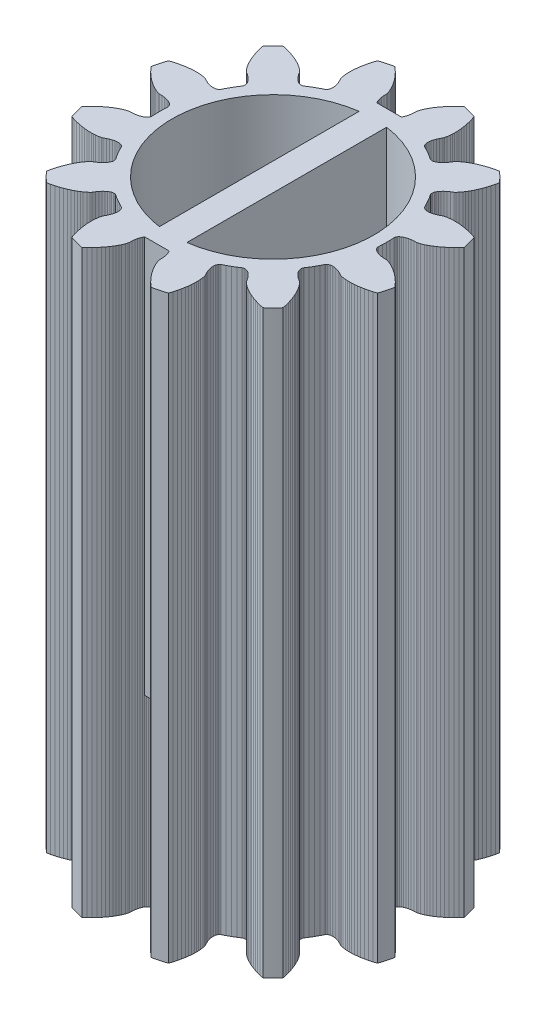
SolidWorks part; units mm, degrees
ref_plane "Front Plane" through (0, 0, 0) normal (0, 0, 1) x (1, 0, 0)
ref_plane "Top Plane" through (0, 0, 0) normal (0, 1, 0) x (1, 0, 0)
ref_plane "Right Plane" through (0, 0, 0) normal (1, 0, 0) x (0, 0, -1)
sketch "Sketch1" plane through (0, 0, 0) normal (0, 1, 0) x (1, 0, 0)
  line L8 (28.152, -3.4281) -> (28.1823, -3.3121)
  line L9 (28.1823, -3.3121) -> (28.2153, -3.2044)
  line L10 (28.2153, -3.2044) -> (28.2502, -3.1056)
  line L11 (28.2502, -3.1056) -> (28.2866, -3.0149)
  line L12 (28.2866, -3.0149) -> (28.3232, -2.9334)
  line L13 (28.3232, -2.9334) -> (28.3606, -2.859)
  line L14 (28.3606, -2.859) -> (28.3967, -2.7939)
  line L15 (28.3967, -2.7939) -> (28.4322, -2.7359)
  line L16 (28.4322, -2.7359) -> (28.4656, -2.686)
  line L17 (28.4656, -2.686) -> (28.5253, -2.6077)
  line L18 (28.5253, -2.6077) -> (28.5714, -2.5567)
  line L19 (28.5714, -2.5567) -> (28.5995, -2.5309)
  line L20 (28.5995, -2.5309) -> (28.6751, -2.4856)
  line L21 (28.6751, -2.4856) -> (28.741, -2.4387)
  line L22 (28.741, -2.4387) -> (28.7972, -2.391)
  line L23 (28.7972, -2.391) -> (28.8438, -2.3431)
  line L24 (28.8438, -2.3431) -> (28.8808, -2.2959)
  line L25 (28.8808, -2.2959) -> (28.9084, -2.25)
  line L26 (28.9084, -2.25) -> (28.9269, -2.2061)
  line L27 (28.9269, -2.2061) -> (28.9364, -2.1649)
  line L28 (28.9364, -2.1649) -> (28.9372, -2.127)
  line L29 (28.9372, -2.127) -> (28.9296, -2.0932)
  line L30 (28.9296, -2.0932) -> (28.9187, -2.0709)
  line L31 (28.9187, -2.0709) -> (28.8502, -1.9651)
  line L32 (28.8502, -1.9651) -> (28.7849, -1.8563)
  line L33 (28.7849, -1.8563) -> (28.7233, -1.7452)
  line L34 (28.7233, -1.7452) -> (28.6659, -1.6331)
  line L35 (28.6659, -1.6331) -> (28.6521, -1.6124)
  line L36 (28.6521, -1.6124) -> (28.6266, -1.589)
  line L37 (28.6266, -1.589) -> (28.5934, -1.5708)
  line L38 (28.5934, -1.5708) -> (28.553, -1.5584)
  line L39 (28.553, -1.5584) -> (28.5057, -1.5524)
  line L40 (28.5057, -1.5524) -> (28.4521, -1.5534)
  line L41 (28.4521, -1.5534) -> (28.3927, -1.5619)
  line L42 (28.3927, -1.5619) -> (28.328, -1.5783)
  line L43 (28.328, -1.5783) -> (28.2585, -1.6031)
  line L44 (28.2585, -1.6031) -> (28.185, -1.6367)
  line L45 (28.185, -1.6367) -> (28.1079, -1.6795)
  line L46 (28.1079, -1.6795) -> (28.0715, -1.6909)
  line L47 (28.0715, -1.6909) -> (28.0043, -1.7053)
  line L48 (28.0043, -1.7053) -> (27.9067, -1.7179)
  line L49 (27.9067, -1.7179) -> (27.8468, -1.7219)
  line L50 (27.8468, -1.7219) -> (27.7788, -1.7236)
  line L51 (27.7788, -1.7236) -> (27.7044, -1.7224)
  line L52 (27.7044, -1.7224) -> (27.6212, -1.7175)
  line L53 (27.6212, -1.7175) -> (27.5323, -1.7085)
  line L54 (27.5323, -1.7085) -> (27.4356, -1.6946)
  line L55 (27.4356, -1.6946) -> (27.3326, -1.6754)
  line L56 (27.3326, -1.6754) -> (27.2228, -1.6502)
  line L57 (27.2228, -1.6502) -> (27.1072, -1.6184)
  line L58 (27.1072, -1.6184) -> (26.9941, -1.5822)
  line L59 (26.8737, -1.1328) -> (26.9535, -1.0449)
  line L60 (26.9535, -1.0449) -> (27.0378, -0.9595)
  line L61 (27.0378, -0.9595) -> (27.1202, -0.8827)
  line L62 (27.1202, -0.8827) -> (27.1998, -0.8146)
  line L63 (27.1998, -0.8146) -> (27.2767, -0.7542)
  line L64 (27.2767, -0.7542) -> (27.3491, -0.7021)
  line L65 (27.3491, -0.7021) -> (27.4187, -0.6562)
  line L66 (27.4187, -0.6562) -> (27.4825, -0.6179)
  line L67 (27.4825, -0.6179) -> (27.5423, -0.5854)
  line L68 (27.5423, -0.5854) -> (27.5961, -0.5589)
  line L69 (27.5961, -0.5589) -> (27.687, -0.521)
  line L70 (27.687, -0.521) -> (27.7524, -0.4999)
  line L71 (27.7524, -0.4999) -> (27.7896, -0.4916)
  line L72 (27.7896, -0.4916) -> (27.8778, -0.4902)
  line L73 (27.8778, -0.4902) -> (27.9583, -0.4825)
  line L74 (27.9583, -0.4825) -> (28.0308, -0.4692)
  line L75 (28.0308, -0.4692) -> (28.0951, -0.4511)
  line L76 (28.0951, -0.4511) -> (28.1508, -0.4287)
  line L77 (28.1508, -0.4287) -> (28.1977, -0.4027)
  line L78 (28.1977, -0.4027) -> (28.2356, -0.374)
  line L79 (28.2356, -0.374) -> (28.2644, -0.343)
  line L80 (28.2644, -0.343) -> (28.284, -0.3107)
  line L81 (28.284, -0.3107) -> (28.2944, -0.2776)
  line L82 (28.2944, -0.2776) -> (28.2961, -0.2528)
  line L83 (28.2961, -0.2528) -> (28.2897, -0.127)
  line L84 (28.2897, -0.127) -> (28.2875, 0)
  line L85 (28.2875, 0) -> (28.2897, 0.1269)
  line L86 (28.2897, 0.1269) -> (28.2961, 0.2527)
  line L87 (28.2961, 0.2527) -> (28.2944, 0.2776)
  line L88 (28.2944, 0.2776) -> (28.284, 0.3106)
  line L89 (28.284, 0.3106) -> (28.2644, 0.343)
  line L90 (28.2644, 0.343) -> (28.2356, 0.3739)
  line L91 (28.2356, 0.3739) -> (28.1977, 0.4027)
  line L92 (28.1977, 0.4027) -> (28.1508, 0.4286)
  line L93 (28.1508, 0.4286) -> (28.0951, 0.451)
  line L94 (28.0951, 0.451) -> (28.0308, 0.4692)
  line L95 (28.0308, 0.4692) -> (27.9583, 0.4824)
  line L96 (27.9583, 0.4824) -> (27.8778, 0.4901)
  line L97 (27.8778, 0.4901) -> (27.7896, 0.4916)
  line L98 (27.7896, 0.4916) -> (27.7524, 0.4998)
  line L99 (27.7524, 0.4998) -> (27.687, 0.521)
  line L100 (27.687, 0.521) -> (27.5961, 0.5589)
  line L101 (27.5961, 0.5589) -> (27.5423, 0.5854)
  line L102 (27.5423, 0.5854) -> (27.4825, 0.6179)
  line L103 (27.4825, 0.6179) -> (27.4187, 0.6562)
  line L104 (27.4187, 0.6562) -> (27.3491, 0.702)
  line L105 (27.3491, 0.702) -> (27.2767, 0.7542)
  line L106 (27.2767, 0.7542) -> (27.1998, 0.8146)
  line L107 (27.1998, 0.8146) -> (27.1202, 0.8827)
  line L108 (27.1202, 0.8827) -> (27.0378, 0.9595)
  line L109 (27.0378, 0.9595) -> (26.9535, 1.0448)
  line L110 (26.9535, 1.0448) -> (26.8737, 1.1327)
  line L111 (26.9941, 1.5822) -> (27.1072, 1.6184)
  line L112 (27.1072, 1.6184) -> (27.2228, 1.6501)
  line L113 (27.2228, 1.6501) -> (27.3326, 1.6754)
  line L114 (27.3326, 1.6754) -> (27.4356, 1.6946)
  line L115 (27.4356, 1.6946) -> (27.5323, 1.7085)
  line L116 (27.5323, 1.7085) -> (27.6212, 1.7174)
  line L117 (27.6212, 1.7174) -> (27.7044, 1.7223)
  line L118 (27.7044, 1.7223) -> (27.7788, 1.7236)
  line L119 (27.7788, 1.7236) -> (27.8468, 1.7219)
  line L120 (27.8468, 1.7219) -> (27.9067, 1.7179)
  line L121 (27.9067, 1.7179) -> (28.0043, 1.7053)
  line L122 (28.0043, 1.7053) -> (28.0715, 1.6909)
  line L123 (28.0715, 1.6909) -> (28.1079, 1.6794)
  line L124 (28.1079, 1.6794) -> (28.185, 1.6366)
  line L125 (28.185, 1.6366) -> (28.2585, 1.603)
  line L126 (28.2585, 1.603) -> (28.328, 1.5782)
  line L127 (28.328, 1.5782) -> (28.3927, 1.5618)
  line L128 (28.3927, 1.5618) -> (28.4521, 1.5534)
  line L129 (28.4521, 1.5534) -> (28.5057, 1.5524)
  line L130 (28.5057, 1.5524) -> (28.553, 1.5583)
  line L131 (28.553, 1.5583) -> (28.5934, 1.5707)
  line L132 (28.5934, 1.5707) -> (28.6266, 1.5889)
  line L133 (28.6266, 1.5889) -> (28.6521, 1.6124)
  line L134 (28.6521, 1.6124) -> (28.6659, 1.6331)
  line L135 (28.6659, 1.6331) -> (28.7233, 1.7452)
  line L136 (28.7233, 1.7452) -> (28.7849, 1.8562)
  line L137 (28.7849, 1.8562) -> (28.8502, 1.9651)
  line L138 (28.8502, 1.9651) -> (28.9187, 2.0708)
  line L139 (28.9187, 2.0708) -> (28.9296, 2.0932)
  line L140 (28.9296, 2.0932) -> (28.9372, 2.127)
  line L141 (28.9372, 2.127) -> (28.9364, 2.1648)
  line L142 (28.9364, 2.1648) -> (28.9269, 2.206)
  line L143 (28.9269, 2.206) -> (28.9084, 2.2499)
  line L144 (28.9084, 2.2499) -> (28.8808, 2.2958)
  line L145 (28.8808, 2.2958) -> (28.8438, 2.3431)
  line L146 (28.8438, 2.3431) -> (28.7972, 2.3909)
  line L147 (28.7972, 2.3909) -> (28.741, 2.4387)
  line L148 (28.741, 2.4387) -> (28.6751, 2.4856)
  line L149 (28.6751, 2.4856) -> (28.5995, 2.5309)
  line L150 (28.5995, 2.5309) -> (28.5714, 2.5567)
  line L151 (28.5714, 2.5567) -> (28.5253, 2.6077)
  line L152 (28.5253, 2.6077) -> (28.4656, 2.686)
  line L153 (28.4656, 2.686) -> (28.4322, 2.7358)
  line L154 (28.4322, 2.7358) -> (28.3967, 2.7938)
  line L155 (28.3967, 2.7938) -> (28.3606, 2.8589)
  line L156 (28.3606, 2.8589) -> (28.3232, 2.9334)
  line L157 (28.3232, 2.9334) -> (28.2866, 3.0148)
  line L158 (28.2866, 3.0148) -> (28.2502, 3.1056)
  line L159 (28.2502, 3.1056) -> (28.2153, 3.2043)
  line L160 (28.2153, 3.2043) -> (28.1823, 3.312)
  line L161 (28.1823, 3.312) -> (28.152, 3.4281)
  line L162 (28.152, 3.4281) -> (28.1269, 3.5441)
  line L163 (28.4559, 3.8731) -> (28.5719, 3.8479)
  line L164 (28.5719, 3.8479) -> (28.6879, 3.8176)
  line L165 (28.6879, 3.8176) -> (28.7956, 3.7846)
  line L166 (28.7956, 3.7846) -> (28.8944, 3.7498)
  line L167 (28.8944, 3.7498) -> (28.9851, 3.7134)
  line L168 (28.9851, 3.7134) -> (29.0666, 3.6767)
  line L169 (29.0666, 3.6767) -> (29.1411, 3.6394)
  line L170 (29.1411, 3.6394) -> (29.2061, 3.6032)
  line L171 (29.2061, 3.6032) -> (29.2642, 3.5678)
  line L172 (29.2642, 3.5678) -> (29.314, 3.5344)
  line L173 (29.314, 3.5344) -> (29.3923, 3.4747)
  line L174 (29.3923, 3.4747) -> (29.4433, 3.4286)
  line L175 (29.4433, 3.4286) -> (29.4691, 3.4005)
  line L176 (29.4691, 3.4005) -> (29.5144, 3.3249)
  line L177 (29.5144, 3.3249) -> (29.5613, 3.259)
  line L178 (29.5613, 3.259) -> (29.6091, 3.2028)
  line L179 (29.6091, 3.2028) -> (29.6569, 3.1562)
  line L180 (29.6569, 3.1562) -> (29.7041, 3.1192)
  line L181 (29.7041, 3.1192) -> (29.7501, 3.0915)
  line L182 (29.7501, 3.0915) -> (29.794, 3.0731)
  line L183 (29.794, 3.0731) -> (29.8352, 3.0636)
  line L184 (29.8352, 3.0636) -> (29.873, 3.0628)
  line L185 (29.873, 3.0628) -> (29.9068, 3.0703)
  line L186 (29.9068, 3.0703) -> (29.9291, 3.0813)
  line L187 (29.9291, 3.0813) -> (30.0349, 3.1498)
  line L188 (30.0349, 3.1498) -> (30.1438, 3.2151)
  line L189 (30.1438, 3.2151) -> (30.2548, 3.2767)
  line L190 (30.2548, 3.2767) -> (30.3669, 3.3341)
  line L191 (30.3669, 3.3341) -> (30.3876, 3.3479)
  line L192 (30.3876, 3.3479) -> (30.4111, 3.3734)
  line L193 (30.4111, 3.3734) -> (30.4293, 3.4066)
  line L194 (30.4293, 3.4066) -> (30.4416, 3.447)
  line L195 (30.4416, 3.447) -> (30.4476, 3.4943)
  line L196 (30.4476, 3.4943) -> (30.4466, 3.5479)
  line L197 (30.4466, 3.5479) -> (30.4382, 3.6073)
  line L198 (30.4382, 3.6073) -> (30.4218, 3.672)
  line L199 (30.4218, 3.672) -> (30.397, 3.7414)
  line L200 (30.397, 3.7414) -> (30.3634, 3.815)
  line L201 (30.3634, 3.815) -> (30.3206, 3.8921)
  line L202 (30.3206, 3.8921) -> (30.3091, 3.9285)
  line L203 (30.3091, 3.9285) -> (30.2947, 3.9957)
  line L204 (30.2947, 3.9957) -> (30.2821, 4.0933)
  line L205 (30.2821, 4.0933) -> (30.2781, 4.1532)
  line L206 (30.2781, 4.1532) -> (30.2764, 4.2212)
  line L207 (30.2764, 4.2212) -> (30.2777, 4.2956)
  line L208 (30.2777, 4.2956) -> (30.2825, 4.3788)
  line L209 (30.2825, 4.3788) -> (30.2915, 4.4676)
  line L210 (30.2915, 4.4676) -> (30.3054, 4.5644)
  line L211 (30.3054, 4.5644) -> (30.3246, 4.6674)
  line L212 (30.3246, 4.6674) -> (30.3498, 4.7771)
  line L213 (30.3498, 4.7771) -> (30.3816, 4.8928)
  line L214 (30.3816, 4.8928) -> (30.4178, 5.0059)
  line L215 (30.8673, 5.1263) -> (30.9551, 5.0465)
  line L216 (30.9551, 5.0465) -> (31.0405, 4.9622)
  line L217 (31.0405, 4.9622) -> (31.1173, 4.8798)
  line L218 (31.1173, 4.8798) -> (31.1854, 4.8002)
  line L219 (31.1854, 4.8002) -> (31.2458, 4.7233)
  line L220 (31.2458, 4.7233) -> (31.298, 4.6509)
  line L221 (31.298, 4.6509) -> (31.3438, 4.5813)
  line L222 (31.3438, 4.5813) -> (31.3821, 4.5174)
  line L223 (31.3821, 4.5174) -> (31.4146, 4.4577)
  line L224 (31.4146, 4.4577) -> (31.4411, 4.4038)
  line L225 (31.4411, 4.4038) -> (31.479, 4.313)
  line L226 (31.479, 4.313) -> (31.5001, 4.2476)
  line L227 (31.5001, 4.2476) -> (31.5084, 4.2103)
  line L228 (31.5084, 4.2103) -> (31.5099, 4.1222)
  line L229 (31.5099, 4.1222) -> (31.5175, 4.0417)
  line L230 (31.5175, 4.0417) -> (31.5308, 3.9692)
  line L231 (31.5308, 3.9692) -> (31.549, 3.9049)
  line L232 (31.549, 3.9049) -> (31.5713, 3.8492)
  line L233 (31.5713, 3.8492) -> (31.5973, 3.8023)
  line L234 (31.5973, 3.8023) -> (31.6261, 3.7644)
  line L235 (31.6261, 3.7644) -> (31.657, 3.7356)
  line L236 (31.657, 3.7356) -> (31.6894, 3.7159)
  line L237 (31.6894, 3.7159) -> (31.7224, 3.7056)
  line L238 (31.7224, 3.7056) -> (31.7473, 3.7039)
  line L239 (31.7473, 3.7039) -> (31.873, 3.7103)
  line L240 (31.873, 3.7103) -> (32, 3.7125)
  line L241 (32, 3.7125) -> (32.127, 3.7103)
  line L242 (32.127, 3.7103) -> (32.2528, 3.7039)
  line L243 (32.2528, 3.7039) -> (32.2776, 3.7056)
  line L244 (32.2776, 3.7056) -> (32.3107, 3.7159)
  line L245 (32.3107, 3.7159) -> (32.343, 3.7356)
  line L246 (32.343, 3.7356) -> (32.3739, 3.7644)
  line L247 (32.3739, 3.7644) -> (32.4027, 3.8023)
  line L248 (32.4027, 3.8023) -> (32.4287, 3.8492)
  line L249 (32.4287, 3.8492) -> (32.4511, 3.9049)
  line L250 (32.4511, 3.9049) -> (32.4692, 3.9692)
  line L251 (32.4692, 3.9692) -> (32.4825, 4.0417)
  line L252 (32.4825, 4.0417) -> (32.4901, 4.1222)
  line L253 (32.4901, 4.1222) -> (32.4916, 4.2103)
  line L254 (32.4916, 4.2103) -> (32.4999, 4.2476)
  line L255 (32.4999, 4.2476) -> (32.521, 4.313)
  line L256 (32.521, 4.313) -> (32.5589, 4.4038)
  line L257 (32.5589, 4.4038) -> (32.5854, 4.4577)
  line L258 (32.5854, 4.4577) -> (32.6179, 4.5174)
  line L259 (32.6179, 4.5174) -> (32.6562, 4.5813)
  line L260 (32.6562, 4.5813) -> (32.702, 4.6509)
  line L261 (32.702, 4.6509) -> (32.7542, 4.7233)
  line L262 (32.7542, 4.7233) -> (32.8146, 4.8002)
  line L263 (32.8146, 4.8002) -> (32.8827, 4.8798)
  line L264 (32.8827, 4.8798) -> (32.9595, 4.9622)
  line L265 (32.9595, 4.9622) -> (33.0449, 5.0465)
  line L266 (33.0449, 5.0465) -> (33.1328, 5.1263)
  line L267 (33.5822, 5.0059) -> (33.6184, 4.8928)
  line L268 (33.6184, 4.8928) -> (33.6502, 4.7771)
  line L269 (33.6502, 4.7771) -> (33.6754, 4.6674)
  line L270 (33.6754, 4.6674) -> (33.6946, 4.5644)
  line L271 (33.6946, 4.5644) -> (33.7085, 4.4676)
  line L272 (33.7085, 4.4676) -> (33.7175, 4.3788)
  line L273 (33.7175, 4.3788) -> (33.7223, 4.2956)
  line L274 (33.7223, 4.2956) -> (33.7236, 4.2212)
  line L275 (33.7236, 4.2212) -> (33.7219, 4.1532)
  line L276 (33.7219, 4.1532) -> (33.7179, 4.0933)
  line L277 (33.7179, 4.0933) -> (33.7053, 3.9957)
  line L278 (33.7053, 3.9957) -> (33.6909, 3.9285)
  line L279 (33.6909, 3.9285) -> (33.6794, 3.8921)
  line L280 (33.6794, 3.8921) -> (33.6366, 3.815)
  line L281 (33.6366, 3.815) -> (33.603, 3.7414)
  line L282 (33.603, 3.7414) -> (33.5782, 3.672)
  line L283 (33.5782, 3.672) -> (33.5618, 3.6073)
  line L284 (33.5618, 3.6073) -> (33.5534, 3.5479)
  line L285 (33.5534, 3.5479) -> (33.5524, 3.4943)
  line L286 (33.5524, 3.4943) -> (33.5584, 3.447)
  line L287 (33.5584, 3.447) -> (33.5707, 3.4066)
  line L288 (33.5707, 3.4066) -> (33.5889, 3.3734)
  line L289 (33.5889, 3.3734) -> (33.6124, 3.3479)
  line L290 (33.6124, 3.3479) -> (33.6331, 3.3341)
  line L291 (33.6331, 3.3341) -> (33.7452, 3.2767)
  line L292 (33.7452, 3.2767) -> (33.8563, 3.2151)
  line L293 (33.8563, 3.2151) -> (33.9651, 3.1498)
  line L294 (33.9651, 3.1498) -> (34.0709, 3.0813)
  line L295 (34.0709, 3.0813) -> (34.0932, 3.0703)
  line L296 (34.0932, 3.0703) -> (34.127, 3.0628)
  line L297 (34.127, 3.0628) -> (34.1648, 3.0636)
  line L298 (34.1648, 3.0636) -> (34.206, 3.0731)
  line L299 (34.206, 3.0731) -> (34.2499, 3.0915)
  line L300 (34.2499, 3.0915) -> (34.2959, 3.1192)
  line L301 (34.2959, 3.1192) -> (34.3431, 3.1562)
  line L302 (34.3431, 3.1562) -> (34.3909, 3.2028)
  line L303 (34.3909, 3.2028) -> (34.4387, 3.259)
  line L304 (34.4387, 3.259) -> (34.4856, 3.3249)
  line L305 (34.4856, 3.3249) -> (34.5309, 3.4005)
  line L306 (34.5309, 3.4005) -> (34.5567, 3.4286)
  line L307 (34.5567, 3.4286) -> (34.6077, 3.4747)
  line L308 (34.6077, 3.4747) -> (34.686, 3.5344)
  line L309 (34.686, 3.5344) -> (34.7358, 3.5678)
  line L310 (34.7358, 3.5678) -> (34.7939, 3.6032)
  line L311 (34.7939, 3.6032) -> (34.859, 3.6394)
  line L312 (34.859, 3.6394) -> (34.9334, 3.6767)
  line L313 (34.9334, 3.6767) -> (35.0149, 3.7134)
  line L314 (35.0149, 3.7134) -> (35.1056, 3.7498)
  line L315 (35.1056, 3.7498) -> (35.2044, 3.7846)
  line L316 (35.2044, 3.7846) -> (35.3121, 3.8176)
  line L317 (35.3121, 3.8176) -> (35.4281, 3.8479)
  line L318 (35.4281, 3.8479) -> (35.5441, 3.8731)
  line L319 (35.8731, 3.5441) -> (35.848, 3.4281)
  line L320 (35.848, 3.4281) -> (35.8177, 3.312)
  line L321 (35.8177, 3.312) -> (35.7847, 3.2043)
  line L322 (35.7847, 3.2043) -> (35.7498, 3.1056)
  line L323 (35.7498, 3.1056) -> (35.7134, 3.0148)
  line L324 (35.7134, 3.0148) -> (35.6768, 2.9334)
  line L325 (35.6768, 2.9334) -> (35.6394, 2.8589)
  line L326 (35.6394, 2.8589) -> (35.6033, 2.7938)
  line L327 (35.6033, 2.7938) -> (35.5678, 2.7358)
  line L328 (35.5678, 2.7358) -> (35.5344, 2.686)
  line L329 (35.5344, 2.686) -> (35.4747, 2.6077)
  line L330 (35.4747, 2.6077) -> (35.4286, 2.5567)
  line L331 (35.4286, 2.5567) -> (35.4005, 2.5309)
  line L332 (35.4005, 2.5309) -> (35.3249, 2.4856)
  line L333 (35.3249, 2.4856) -> (35.259, 2.4387)
  line L334 (35.259, 2.4387) -> (35.2028, 2.3909)
  line L335 (35.2028, 2.3909) -> (35.1562, 2.3431)
  line L336 (35.1562, 2.3431) -> (35.1192, 2.2958)
  line L337 (35.1192, 2.2958) -> (35.0916, 2.2499)
  line L338 (35.0916, 2.2499) -> (35.0731, 2.206)
  line L339 (35.0731, 2.206) -> (35.0636, 2.1648)
  line L340 (35.0636, 2.1648) -> (35.0628, 2.127)
  line L341 (35.0628, 2.127) -> (35.0704, 2.0932)
  line L342 (35.0704, 2.0932) -> (35.0813, 2.0708)
  line L343 (35.0813, 2.0708) -> (35.1498, 1.9651)
  line L344 (35.1498, 1.9651) -> (35.2151, 1.8562)
  line L345 (35.2151, 1.8562) -> (35.2767, 1.7452)
  line L346 (35.2767, 1.7452) -> (35.3341, 1.6331)
  line L347 (35.3341, 1.6331) -> (35.3479, 1.6124)
  line L348 (35.3479, 1.6124) -> (35.3734, 1.5889)
  line L349 (35.3734, 1.5889) -> (35.4066, 1.5707)
  line L350 (35.4066, 1.5707) -> (35.447, 1.5583)
  line L351 (35.447, 1.5583) -> (35.4943, 1.5524)
  line L352 (35.4943, 1.5524) -> (35.5479, 1.5534)
  line L353 (35.5479, 1.5534) -> (35.6073, 1.5618)
  line L354 (35.6073, 1.5618) -> (35.672, 1.5782)
  line L355 (35.672, 1.5782) -> (35.7415, 1.603)
  line L356 (35.7415, 1.603) -> (35.815, 1.6366)
  line L357 (35.815, 1.6366) -> (35.8921, 1.6794)
  line L358 (35.8921, 1.6794) -> (35.9285, 1.6909)
  line L359 (35.9285, 1.6909) -> (35.9957, 1.7053)
  line L360 (35.9957, 1.7053) -> (36.0933, 1.7179)
  line L361 (36.0933, 1.7179) -> (36.1532, 1.7219)
  line L362 (36.1532, 1.7219) -> (36.2212, 1.7236)
  line L363 (36.2212, 1.7236) -> (36.2956, 1.7223)
  line L364 (36.2956, 1.7223) -> (36.3788, 1.7174)
  line L365 (36.3788, 1.7174) -> (36.4677, 1.7085)
  line L366 (36.4677, 1.7085) -> (36.5644, 1.6946)
  line L367 (36.5644, 1.6946) -> (36.6674, 1.6754)
  line L368 (36.6674, 1.6754) -> (36.7772, 1.6501)
  line L369 (36.7772, 1.6501) -> (36.8928, 1.6184)
  line L370 (36.8928, 1.6184) -> (37.0059, 1.5822)
  line L371 (37.1263, 1.1327) -> (37.0465, 1.0448)
  line L372 (37.0465, 1.0448) -> (36.9622, 0.9595)
  line L373 (36.9622, 0.9595) -> (36.8798, 0.8827)
  line L374 (36.8798, 0.8827) -> (36.8002, 0.8146)
  line L375 (36.8002, 0.8146) -> (36.7234, 0.7542)
  line L376 (36.7234, 0.7542) -> (36.6509, 0.702)
  line L377 (36.6509, 0.702) -> (36.5813, 0.6562)
  line L378 (36.5813, 0.6562) -> (36.5175, 0.6179)
  line L379 (36.5175, 0.6179) -> (36.4577, 0.5854)
  line L380 (36.4577, 0.5854) -> (36.4039, 0.5589)
  line L381 (36.4039, 0.5589) -> (36.313, 0.521)
  line L382 (36.313, 0.521) -> (36.2476, 0.4998)
  line L383 (36.2476, 0.4998) -> (36.2104, 0.4916)
  line L384 (36.2104, 0.4916) -> (36.1222, 0.4901)
  line L385 (36.1222, 0.4901) -> (36.0417, 0.4824)
  line L386 (36.0417, 0.4824) -> (35.9692, 0.4692)
  line L387 (35.9692, 0.4692) -> (35.9049, 0.451)
  line L388 (35.9049, 0.451) -> (35.8492, 0.4286)
  line L389 (35.8492, 0.4286) -> (35.8023, 0.4027)
  line L390 (35.8023, 0.4027) -> (35.7644, 0.3739)
  line L391 (35.7644, 0.3739) -> (35.7356, 0.343)
  line L392 (35.7356, 0.343) -> (35.716, 0.3106)
  line L393 (35.716, 0.3106) -> (35.7056, 0.2776)
  line L394 (35.7056, 0.2776) -> (35.7039, 0.2527)
  line L395 (35.7039, 0.2527) -> (35.7103, 0.1269)
  line L396 (35.7103, 0.1269) -> (35.7125, 0)
  line L397 (35.7125, 0) -> (35.7103, -0.127)
  line L398 (35.7103, -0.127) -> (35.7039, -0.2528)
  line L399 (35.7039, -0.2528) -> (35.7056, -0.2776)
  line L400 (35.7056, -0.2776) -> (35.716, -0.3107)
  line L401 (35.716, -0.3107) -> (35.7356, -0.343)
  line L402 (35.7356, -0.343) -> (35.7644, -0.374)
  line L403 (35.7644, -0.374) -> (35.8023, -0.4027)
  line L404 (35.8023, -0.4027) -> (35.8492, -0.4287)
  line L405 (35.8492, -0.4287) -> (35.9049, -0.4511)
  line L406 (35.9049, -0.4511) -> (35.9692, -0.4692)
  line L407 (35.9692, -0.4692) -> (36.0417, -0.4825)
  line L408 (36.0417, -0.4825) -> (36.1222, -0.4902)
  line L409 (36.1222, -0.4902) -> (36.2104, -0.4916)
  line L410 (36.2104, -0.4916) -> (36.2476, -0.4999)
  line L411 (36.2476, -0.4999) -> (36.313, -0.521)
  line L412 (36.313, -0.521) -> (36.4039, -0.5589)
  line L413 (36.4039, -0.5589) -> (36.4577, -0.5854)
  line L414 (36.4577, -0.5854) -> (36.5175, -0.6179)
  line L415 (36.5175, -0.6179) -> (36.5813, -0.6562)
  line L416 (36.5813, -0.6562) -> (36.6509, -0.7021)
  line L417 (36.6509, -0.7021) -> (36.7234, -0.7542)
  line L418 (36.7234, -0.7542) -> (36.8002, -0.8146)
  line L419 (36.8002, -0.8146) -> (36.8798, -0.8827)
  line L420 (36.8798, -0.8827) -> (36.9622, -0.9595)
  line L421 (36.9622, -0.9595) -> (37.0465, -1.0449)
  line L422 (37.0465, -1.0449) -> (37.1263, -1.1328)
  line L423 (37.0059, -1.5822) -> (36.8928, -1.6184)
  line L424 (36.8928, -1.6184) -> (36.7772, -1.6502)
  line L425 (36.7772, -1.6502) -> (36.6674, -1.6754)
  line L426 (36.6674, -1.6754) -> (36.5644, -1.6946)
  line L427 (36.5644, -1.6946) -> (36.4677, -1.7085)
  line L428 (36.4677, -1.7085) -> (36.3788, -1.7175)
  line L429 (36.3788, -1.7175) -> (36.2956, -1.7224)
  line L430 (36.2956, -1.7224) -> (36.2212, -1.7236)
  line L431 (36.2212, -1.7236) -> (36.1532, -1.7219)
  line L432 (36.1532, -1.7219) -> (36.0933, -1.7179)
  line L433 (36.0933, -1.7179) -> (35.9957, -1.7053)
  line L434 (35.9957, -1.7053) -> (35.9285, -1.6909)
  line L435 (35.9285, -1.6909) -> (35.8921, -1.6795)
  line L436 (35.8921, -1.6795) -> (35.815, -1.6367)
  line L437 (35.815, -1.6367) -> (35.7415, -1.6031)
  line L438 (35.7415, -1.6031) -> (35.672, -1.5783)
  line L439 (35.672, -1.5783) -> (35.6073, -1.5619)
  line L440 (35.6073, -1.5619) -> (35.5479, -1.5534)
  line L441 (35.5479, -1.5534) -> (35.4943, -1.5524)
  line L442 (35.4943, -1.5524) -> (35.447, -1.5584)
  line L443 (35.447, -1.5584) -> (35.4066, -1.5708)
  line L444 (35.4066, -1.5708) -> (35.3734, -1.589)
  line L445 (35.3734, -1.589) -> (35.3479, -1.6124)
  line L446 (35.3479, -1.6124) -> (35.3341, -1.6331)
  line L447 (35.3341, -1.6331) -> (35.2767, -1.7452)
  line L448 (35.2767, -1.7452) -> (35.2151, -1.8563)
  line L449 (35.2151, -1.8563) -> (35.1498, -1.9651)
  line L450 (35.1498, -1.9651) -> (35.0813, -2.0709)
  line L451 (35.0813, -2.0709) -> (35.0704, -2.0932)
  line L452 (35.0704, -2.0932) -> (35.0628, -2.127)
  line L453 (35.0628, -2.127) -> (35.0636, -2.1649)
  line L454 (35.0636, -2.1649) -> (35.0731, -2.2061)
  line L455 (35.0731, -2.2061) -> (35.0916, -2.25)
  line L456 (35.0916, -2.25) -> (35.1192, -2.2959)
  line L457 (35.1192, -2.2959) -> (35.1562, -2.3431)
  line L458 (35.1562, -2.3431) -> (35.2028, -2.391)
  line L459 (35.2028, -2.391) -> (35.259, -2.4387)
  line L460 (35.259, -2.4387) -> (35.3249, -2.4856)
  line L461 (35.3249, -2.4856) -> (35.4005, -2.5309)
  line L462 (35.4005, -2.5309) -> (35.4286, -2.5567)
  line L463 (35.4286, -2.5567) -> (35.4747, -2.6077)
  line L464 (35.4747, -2.6077) -> (35.5344, -2.686)
  line L465 (35.5344, -2.686) -> (35.5678, -2.7359)
  line L466 (35.5678, -2.7359) -> (35.6033, -2.7939)
  line L467 (35.6033, -2.7939) -> (35.6394, -2.859)
  line L468 (35.6394, -2.859) -> (35.6768, -2.9334)
  line L469 (35.6768, -2.9334) -> (35.7134, -3.0149)
  line L470 (35.7134, -3.0149) -> (35.7498, -3.1056)
  line L471 (35.7498, -3.1056) -> (35.7847, -3.2044)
  line L472 (35.7847, -3.2044) -> (35.8177, -3.3121)
  line L473 (35.8177, -3.3121) -> (35.848, -3.4281)
  line L474 (35.848, -3.4281) -> (35.8731, -3.5442)
  line L475 (35.5441, -3.8732) -> (35.4281, -3.848)
  line L476 (35.4281, -3.848) -> (35.3121, -3.8177)
  line L477 (35.3121, -3.8177) -> (35.2044, -3.7847)
  line L478 (35.2044, -3.7847) -> (35.1056, -3.7498)
  line L479 (35.1056, -3.7498) -> (35.0149, -3.7134)
  line L480 (35.0149, -3.7134) -> (34.9334, -3.6768)
  line L481 (34.9334, -3.6768) -> (34.859, -3.6394)
  line L482 (34.859, -3.6394) -> (34.7939, -3.6033)
  line L483 (34.7939, -3.6033) -> (34.7358, -3.5678)
  line L484 (34.7358, -3.5678) -> (34.686, -3.5344)
  line L485 (34.686, -3.5344) -> (34.6077, -3.4747)
  line L486 (34.6077, -3.4747) -> (34.5567, -3.4286)
  line L487 (34.5567, -3.4286) -> (34.5309, -3.4005)
  line L488 (34.5309, -3.4005) -> (34.4856, -3.3249)
  line L489 (34.4856, -3.3249) -> (34.4387, -3.259)
  line L490 (34.4387, -3.259) -> (34.3909, -3.2028)
  line L491 (34.3909, -3.2028) -> (34.3431, -3.1563)
  line L492 (34.3431, -3.1563) -> (34.2959, -3.1192)
  line L493 (34.2959, -3.1192) -> (34.2499, -3.0916)
  line L494 (34.2499, -3.0916) -> (34.206, -3.0731)
  line L495 (34.206, -3.0731) -> (34.1648, -3.0636)
  line L496 (34.1648, -3.0636) -> (34.127, -3.0628)
  line L497 (34.127, -3.0628) -> (34.0932, -3.0704)
  line L498 (34.0932, -3.0704) -> (34.0709, -3.0813)
  line L499 (34.0709, -3.0813) -> (33.9651, -3.1498)
  line L500 (33.9651, -3.1498) -> (33.8563, -3.2151)
  line L501 (33.8563, -3.2151) -> (33.7452, -3.2767)
  line L502 (33.7452, -3.2767) -> (33.6331, -3.3341)
  line L503 (33.6331, -3.3341) -> (33.6124, -3.348)
  line L504 (33.6124, -3.348) -> (33.5889, -3.3735)
  line L505 (33.5889, -3.3735) -> (33.5707, -3.4066)
  line L506 (33.5707, -3.4066) -> (33.5584, -3.4471)
  line L507 (33.5584, -3.4471) -> (33.5524, -3.4943)
  line L508 (33.5524, -3.4943) -> (33.5534, -3.5479)
  line L509 (33.5534, -3.5479) -> (33.5618, -3.6073)
  line L510 (33.5618, -3.6073) -> (33.5782, -3.672)
  line L511 (33.5782, -3.672) -> (33.603, -3.7415)
  line L512 (33.603, -3.7415) -> (33.6366, -3.815)
  line L513 (33.6366, -3.815) -> (33.6794, -3.8921)
  line L514 (33.6794, -3.8921) -> (33.6909, -3.9285)
  line L515 (33.6909, -3.9285) -> (33.7053, -3.9957)
  line L516 (33.7053, -3.9957) -> (33.7179, -4.0933)
  line L517 (33.7179, -4.0933) -> (33.7219, -4.1532)
  line L518 (33.7219, -4.1532) -> (33.7236, -4.2212)
  line L519 (33.7236, -4.2212) -> (33.7223, -4.2956)
  line L520 (33.7223, -4.2956) -> (33.7175, -4.3788)
  line L521 (33.7175, -4.3788) -> (33.7085, -4.4677)
  line L522 (33.7085, -4.4677) -> (33.6946, -4.5644)
  line L523 (33.6946, -4.5644) -> (33.6754, -4.6674)
  line L524 (33.6754, -4.6674) -> (33.6502, -4.7772)
  line L525 (33.6502, -4.7772) -> (33.6184, -4.8928)
  line L526 (33.6184, -4.8928) -> (33.5822, -5.0059)
  line L527 (33.1327, -5.1263) -> (33.0449, -5.0465)
  line L528 (33.0449, -5.0465) -> (32.9595, -4.9622)
  line L529 (32.9595, -4.9622) -> (32.8827, -4.8798)
  line L530 (32.8827, -4.8798) -> (32.8146, -4.8002)
  line L531 (32.8146, -4.8002) -> (32.7542, -4.7234)
  line L532 (32.7542, -4.7234) -> (32.702, -4.6509)
  line L533 (32.702, -4.6509) -> (32.6562, -4.5813)
  line L534 (32.6562, -4.5813) -> (32.6179, -4.5175)
  line L535 (32.6179, -4.5175) -> (32.5854, -4.4578)
  line L536 (32.5854, -4.4578) -> (32.5589, -4.4039)
  line L537 (32.5589, -4.4039) -> (32.521, -4.3131)
  line L538 (32.521, -4.3131) -> (32.4999, -4.2477)
  line L539 (32.4999, -4.2477) -> (32.4916, -4.2104)
  line L540 (32.4916, -4.2104) -> (32.4901, -4.1223)
  line L541 (32.4901, -4.1223) -> (32.4825, -4.0417)
  line L542 (32.4825, -4.0417) -> (32.4692, -3.9692)
  line L543 (32.4692, -3.9692) -> (32.4511, -3.905)
  line L544 (32.4511, -3.905) -> (32.4287, -3.8493)
  line L545 (32.4287, -3.8493) -> (32.4027, -3.8024)
  line L546 (32.4027, -3.8024) -> (32.3739, -3.7644)
  line L547 (32.3739, -3.7644) -> (32.343, -3.7356)
  line L548 (32.343, -3.7356) -> (32.3107, -3.716)
  line L549 (32.3107, -3.716) -> (32.2776, -3.7056)
  line L550 (32.2776, -3.7056) -> (32.2528, -3.704)
  line L551 (32.2528, -3.704) -> (32.127, -3.7104)
  line L552 (32.127, -3.7104) -> (32, -3.7125)
  line L553 (32, -3.7125) -> (31.873, -3.7104)
  line L554 (31.873, -3.7104) -> (31.7473, -3.704)
  line L555 (31.7473, -3.704) -> (31.7224, -3.7056)
  line L556 (31.7224, -3.7056) -> (31.6894, -3.716)
  line L557 (31.6894, -3.716) -> (31.657, -3.7356)
  line L558 (31.657, -3.7356) -> (31.6261, -3.7644)
  line L559 (31.6261, -3.7644) -> (31.5973, -3.8024)
  line L560 (31.5973, -3.8024) -> (31.5713, -3.8493)
  line L561 (31.5713, -3.8493) -> (31.549, -3.905)
  line L562 (31.549, -3.905) -> (31.5308, -3.9692)
  line L563 (31.5308, -3.9692) -> (31.5175, -4.0417)
  line L564 (31.5175, -4.0417) -> (31.5099, -4.1223)
  line L565 (31.5099, -4.1223) -> (31.5084, -4.2104)
  line L566 (31.5084, -4.2104) -> (31.5001, -4.2477)
  line L567 (31.5001, -4.2477) -> (31.479, -4.3131)
  line L568 (31.479, -4.3131) -> (31.4411, -4.4039)
  line L569 (31.4411, -4.4039) -> (31.4146, -4.4578)
  line L570 (31.4146, -4.4578) -> (31.3821, -4.5175)
  line L571 (31.3821, -4.5175) -> (31.3438, -4.5813)
  line L572 (31.3438, -4.5813) -> (31.298, -4.6509)
  line L573 (31.298, -4.6509) -> (31.2458, -4.7234)
  line L574 (31.2458, -4.7234) -> (31.1854, -4.8002)
  line L575 (31.1854, -4.8002) -> (31.1173, -4.8798)
  line L576 (31.1173, -4.8798) -> (31.0405, -4.9622)
  line L577 (31.0405, -4.9622) -> (30.9551, -5.0465)
  line L578 (30.9551, -5.0465) -> (30.8673, -5.1263)
  line L579 (30.4178, -5.0059) -> (30.3816, -4.8928)
  line L580 (30.3816, -4.8928) -> (30.3498, -4.7772)
  line L581 (30.3498, -4.7772) -> (30.3246, -4.6674)
  line L582 (30.3246, -4.6674) -> (30.3054, -4.5644)
  line L583 (30.3054, -4.5644) -> (30.2915, -4.4677)
  line L584 (30.2915, -4.4677) -> (30.2825, -4.3788)
  line L585 (30.2825, -4.3788) -> (30.2777, -4.2956)
  line L586 (30.2777, -4.2956) -> (30.2764, -4.2212)
  line L587 (30.2764, -4.2212) -> (30.2781, -4.1532)
  line L588 (30.2781, -4.1532) -> (30.2821, -4.0933)
  line L589 (30.2821, -4.0933) -> (30.2947, -3.9957)
  line L590 (30.2947, -3.9957) -> (30.3091, -3.9285)
  line L591 (30.3091, -3.9285) -> (30.3206, -3.8921)
  line L592 (30.3206, -3.8921) -> (30.3634, -3.815)
  line L593 (30.3634, -3.815) -> (30.397, -3.7415)
  line L594 (30.397, -3.7415) -> (30.4218, -3.672)
  line L595 (30.4218, -3.672) -> (30.4382, -3.6073)
  line L596 (30.4382, -3.6073) -> (30.4466, -3.5479)
  line L597 (30.4466, -3.5479) -> (30.4476, -3.4943)
  line L598 (30.4476, -3.4943) -> (30.4416, -3.4471)
  line L599 (30.4416, -3.4471) -> (30.4293, -3.4066)
  line L600 (30.4293, -3.4066) -> (30.4111, -3.3735)
  line L601 (30.4111, -3.3735) -> (30.3876, -3.348)
  line L602 (30.3876, -3.348) -> (30.3669, -3.3341)
  line L603 (30.3669, -3.3341) -> (30.2548, -3.2767)
  line L604 (30.2548, -3.2767) -> (30.1438, -3.2151)
  line L605 (30.1438, -3.2151) -> (30.0349, -3.1498)
  line L606 (30.0349, -3.1498) -> (29.9291, -3.0813)
  line L607 (29.9291, -3.0813) -> (29.9068, -3.0704)
  line L608 (29.9068, -3.0704) -> (29.873, -3.0628)
  line L609 (29.873, -3.0628) -> (29.8352, -3.0636)
  line L610 (29.8352, -3.0636) -> (29.794, -3.0731)
  line L611 (29.794, -3.0731) -> (29.7501, -3.0916)
  line L612 (29.7501, -3.0916) -> (29.7041, -3.1192)
  line L613 (29.7041, -3.1192) -> (29.6569, -3.1563)
  line L614 (29.6569, -3.1563) -> (29.6091, -3.2028)
  line L615 (29.6091, -3.2028) -> (29.5613, -3.259)
  line L616 (29.5613, -3.259) -> (29.5144, -3.3249)
  line L617 (29.5144, -3.3249) -> (29.4691, -3.4005)
  line L618 (29.4691, -3.4005) -> (29.4433, -3.4286)
  line L619 (29.4433, -3.4286) -> (29.3923, -3.4747)
  line L620 (29.3923, -3.4747) -> (29.314, -3.5344)
  line L621 (29.314, -3.5344) -> (29.2642, -3.5678)
  line L622 (29.2642, -3.5678) -> (29.2061, -3.6033)
  line L623 (29.2061, -3.6033) -> (29.1411, -3.6394)
  line L624 (29.1411, -3.6394) -> (29.0666, -3.6768)
  line L625 (29.0666, -3.6768) -> (28.9851, -3.7134)
  line L626 (28.9851, -3.7134) -> (28.8944, -3.7498)
  line L627 (28.8944, -3.7498) -> (28.7956, -3.7847)
  line L628 (28.7956, -3.7847) -> (28.6879, -3.8177)
  line L629 (28.6879, -3.8177) -> (28.5719, -3.848)
  line L630 (28.5719, -3.848) -> (28.4559, -3.8732)
  line L631 (28.1269, -3.5442) -> (28.152, -3.4281)
  line L1856 (28.152, -3.4281) -> (28.1823, -3.3121)
  line L1857 (28.1823, -3.3121) -> (28.2153, -3.2044)
  line L1858 (28.2153, -3.2044) -> (28.2502, -3.1056)
  line L1859 (28.2502, -3.1056) -> (28.2866, -3.0149)
  line L1860 (28.2866, -3.0149) -> (28.3232, -2.9334)
  line L1861 (28.3232, -2.9334) -> (28.3606, -2.859)
  line L1862 (28.3606, -2.859) -> (28.3967, -2.7939)
  line L1863 (28.3967, -2.7939) -> (28.4322, -2.7359)
  line L1864 (28.4322, -2.7359) -> (28.4656, -2.686)
  line L1865 (28.4656, -2.686) -> (28.5253, -2.6077)
  line L1866 (28.5253, -2.6077) -> (28.5714, -2.5567)
  line L1867 (28.5714, -2.5567) -> (28.5995, -2.5309)
  line L1868 (28.5995, -2.5309) -> (28.6751, -2.4856)
  line L1869 (28.6751, -2.4856) -> (28.741, -2.4387)
  line L1870 (28.741, -2.4387) -> (28.7972, -2.391)
  line L1871 (28.7972, -2.391) -> (28.8438, -2.3431)
  line L1872 (28.8438, -2.3431) -> (28.8808, -2.2959)
  line L1873 (28.8808, -2.2959) -> (28.9084, -2.25)
  line L1874 (28.9084, -2.25) -> (28.9269, -2.2061)
  line L1875 (28.9269, -2.2061) -> (28.9364, -2.1649)
  line L1876 (28.9364, -2.1649) -> (28.9372, -2.127)
  line L1877 (28.9372, -2.127) -> (28.9296, -2.0932)
  line L1878 (28.9296, -2.0932) -> (28.9187, -2.0709)
  line L1879 (28.9187, -2.0709) -> (28.8502, -1.9651)
  line L1880 (28.8502, -1.9651) -> (28.7849, -1.8563)
  line L1881 (28.7849, -1.8563) -> (28.7233, -1.7452)
  line L1882 (28.7233, -1.7452) -> (28.6659, -1.6331)
  line L1883 (28.6659, -1.6331) -> (28.6521, -1.6124)
  line L1884 (28.6521, -1.6124) -> (28.6266, -1.589)
  line L1885 (28.6266, -1.589) -> (28.5934, -1.5708)
  line L1886 (28.5934, -1.5708) -> (28.553, -1.5584)
  line L1887 (28.553, -1.5584) -> (28.5057, -1.5524)
  line L1888 (28.5057, -1.5524) -> (28.4521, -1.5534)
  line L1889 (28.4521, -1.5534) -> (28.3927, -1.5619)
  line L1890 (28.3927, -1.5619) -> (28.328, -1.5783)
  line L1891 (28.328, -1.5783) -> (28.2585, -1.6031)
  line L1892 (28.2585, -1.6031) -> (28.185, -1.6367)
  line L1893 (28.185, -1.6367) -> (28.1079, -1.6795)
  line L1894 (28.1079, -1.6795) -> (28.0715, -1.6909)
  line L1895 (28.0715, -1.6909) -> (28.0043, -1.7053)
  line L1896 (28.0043, -1.7053) -> (27.9067, -1.7179)
  line L1897 (27.9067, -1.7179) -> (27.8468, -1.7219)
  line L1898 (27.8468, -1.7219) -> (27.7788, -1.7236)
  line L1899 (27.7788, -1.7236) -> (27.7044, -1.7224)
  line L1900 (27.7044, -1.7224) -> (27.6212, -1.7175)
  line L1901 (27.6212, -1.7175) -> (27.5323, -1.7085)
  line L1902 (27.5323, -1.7085) -> (27.4356, -1.6946)
  line L1903 (27.4356, -1.6946) -> (27.3326, -1.6754)
  line L1904 (27.3326, -1.6754) -> (27.2228, -1.6502)
  line L1905 (27.2228, -1.6502) -> (27.1072, -1.6184)
  line L1906 (27.1072, -1.6184) -> (26.9941, -1.5822)
  line L1907 (26.8737, -1.1328) -> (26.9535, -1.0449)
  line L1908 (26.9535, -1.0449) -> (27.0378, -0.9595)
  line L1909 (27.0378, -0.9595) -> (27.1202, -0.8827)
  line L1910 (27.1202, -0.8827) -> (27.1998, -0.8146)
  line L1911 (27.1998, -0.8146) -> (27.2767, -0.7542)
  line L1912 (27.2767, -0.7542) -> (27.3491, -0.7021)
  line L1913 (27.3491, -0.7021) -> (27.4187, -0.6562)
  line L1914 (27.4187, -0.6562) -> (27.4825, -0.6179)
  line L1915 (27.4825, -0.6179) -> (27.5423, -0.5854)
  line L1916 (27.5423, -0.5854) -> (27.5961, -0.5589)
  line L1917 (27.5961, -0.5589) -> (27.687, -0.521)
  line L1918 (27.687, -0.521) -> (27.7524, -0.4999)
  line L1919 (27.7524, -0.4999) -> (27.7896, -0.4916)
  line L1920 (27.7896, -0.4916) -> (27.8778, -0.4902)
  line L1921 (27.8778, -0.4902) -> (27.9583, -0.4825)
  line L1922 (27.9583, -0.4825) -> (28.0308, -0.4692)
  line L1923 (28.0308, -0.4692) -> (28.0951, -0.4511)
  line L1924 (28.0951, -0.4511) -> (28.1508, -0.4287)
  line L1925 (28.1508, -0.4287) -> (28.1977, -0.4027)
  line L1926 (28.1977, -0.4027) -> (28.2356, -0.374)
  line L1927 (28.2356, -0.374) -> (28.2644, -0.343)
  line L1928 (28.2644, -0.343) -> (28.284, -0.3107)
  line L1929 (28.284, -0.3107) -> (28.2944, -0.2776)
  line L1930 (28.2944, -0.2776) -> (28.2961, -0.2528)
  line L1931 (28.2961, -0.2528) -> (28.2897, -0.127)
  line L1932 (28.2897, -0.127) -> (28.2875, 0)
  line L1933 (28.2875, 0) -> (28.2897, 0.1269)
  line L1934 (28.2897, 0.1269) -> (28.2961, 0.2527)
  line L1935 (28.2961, 0.2527) -> (28.2944, 0.2776)
  line L1936 (28.2944, 0.2776) -> (28.284, 0.3106)
  line L1937 (28.284, 0.3106) -> (28.2644, 0.343)
  line L1938 (28.2644, 0.343) -> (28.2356, 0.3739)
  line L1939 (28.2356, 0.3739) -> (28.1977, 0.4027)
  line L1940 (28.1977, 0.4027) -> (28.1508, 0.4286)
  line L1941 (28.1508, 0.4286) -> (28.0951, 0.451)
  line L1942 (28.0951, 0.451) -> (28.0308, 0.4692)
  line L1943 (28.0308, 0.4692) -> (27.9583, 0.4824)
  line L1944 (27.9583, 0.4824) -> (27.8778, 0.4901)
  line L1945 (27.8778, 0.4901) -> (27.7896, 0.4916)
  line L1946 (27.7896, 0.4916) -> (27.7524, 0.4998)
  line L1947 (27.7524, 0.4998) -> (27.687, 0.521)
  line L1948 (27.687, 0.521) -> (27.5961, 0.5589)
  line L1949 (27.5961, 0.5589) -> (27.5423, 0.5854)
  line L1950 (27.5423, 0.5854) -> (27.4825, 0.6179)
  line L1951 (27.4825, 0.6179) -> (27.4187, 0.6562)
  line L1952 (27.4187, 0.6562) -> (27.3491, 0.702)
  line L1953 (27.3491, 0.702) -> (27.2767, 0.7542)
  line L1954 (27.2767, 0.7542) -> (27.1998, 0.8146)
  line L1955 (27.1998, 0.8146) -> (27.1202, 0.8827)
  line L1956 (27.1202, 0.8827) -> (27.0378, 0.9595)
  line L1957 (27.0378, 0.9595) -> (26.9535, 1.0448)
  line L1958 (26.9535, 1.0448) -> (26.8737, 1.1327)
  line L1959 (26.9941, 1.5822) -> (27.1072, 1.6184)
  line L1960 (27.1072, 1.6184) -> (27.2228, 1.6501)
  line L1961 (27.2228, 1.6501) -> (27.3326, 1.6754)
  line L1962 (27.3326, 1.6754) -> (27.4356, 1.6946)
  line L1963 (27.4356, 1.6946) -> (27.5323, 1.7085)
  line L1964 (27.5323, 1.7085) -> (27.6212, 1.7174)
  line L1965 (27.6212, 1.7174) -> (27.7044, 1.7223)
  line L1966 (27.7044, 1.7223) -> (27.7788, 1.7236)
  line L1967 (27.7788, 1.7236) -> (27.8468, 1.7219)
  line L1968 (27.8468, 1.7219) -> (27.9067, 1.7179)
  line L1969 (27.9067, 1.7179) -> (28.0043, 1.7053)
  line L1970 (28.0043, 1.7053) -> (28.0715, 1.6909)
  line L1971 (28.0715, 1.6909) -> (28.1079, 1.6794)
  line L1972 (28.1079, 1.6794) -> (28.185, 1.6366)
  line L1973 (28.185, 1.6366) -> (28.2585, 1.603)
  line L1974 (28.2585, 1.603) -> (28.328, 1.5782)
  line L1975 (28.328, 1.5782) -> (28.3927, 1.5618)
  line L1976 (28.3927, 1.5618) -> (28.4521, 1.5534)
  line L1977 (28.4521, 1.5534) -> (28.5057, 1.5524)
  line L1978 (28.5057, 1.5524) -> (28.553, 1.5583)
  line L1979 (28.553, 1.5583) -> (28.5934, 1.5707)
  line L1980 (28.5934, 1.5707) -> (28.6266, 1.5889)
  line L1981 (28.6266, 1.5889) -> (28.6521, 1.6124)
  line L1982 (28.6521, 1.6124) -> (28.6659, 1.6331)
  line L1983 (28.6659, 1.6331) -> (28.7233, 1.7452)
  line L1984 (28.7233, 1.7452) -> (28.7849, 1.8562)
  line L1985 (28.7849, 1.8562) -> (28.8502, 1.9651)
  line L1986 (28.8502, 1.9651) -> (28.9187, 2.0708)
  line L1987 (28.9187, 2.0708) -> (28.9296, 2.0932)
  line L1988 (28.9296, 2.0932) -> (28.9372, 2.127)
  line L1989 (28.9372, 2.127) -> (28.9364, 2.1648)
  line L1990 (28.9364, 2.1648) -> (28.9269, 2.206)
  line L1991 (28.9269, 2.206) -> (28.9084, 2.2499)
  line L1992 (28.9084, 2.2499) -> (28.8808, 2.2958)
  line L1993 (28.8808, 2.2958) -> (28.8438, 2.3431)
  line L1994 (28.8438, 2.3431) -> (28.7972, 2.3909)
  line L1995 (28.7972, 2.3909) -> (28.741, 2.4387)
  line L1996 (28.741, 2.4387) -> (28.6751, 2.4856)
  line L1997 (28.6751, 2.4856) -> (28.5995, 2.5309)
  line L1998 (28.5995, 2.5309) -> (28.5714, 2.5567)
  line L1999 (28.5714, 2.5567) -> (28.5253, 2.6077)
  line L2000 (28.5253, 2.6077) -> (28.4656, 2.686)
  line L2001 (28.4656, 2.686) -> (28.4322, 2.7358)
  line L2002 (28.4322, 2.7358) -> (28.3967, 2.7938)
  line L2003 (28.3967, 2.7938) -> (28.3606, 2.8589)
  line L2004 (28.3606, 2.8589) -> (28.3232, 2.9334)
  line L2005 (28.3232, 2.9334) -> (28.2866, 3.0148)
  line L2006 (28.2866, 3.0148) -> (28.2502, 3.1056)
  line L2007 (28.2502, 3.1056) -> (28.2153, 3.2043)
  line L2008 (28.2153, 3.2043) -> (28.1823, 3.312)
  line L2009 (28.1823, 3.312) -> (28.152, 3.4281)
  line L2010 (28.152, 3.4281) -> (28.1269, 3.5441)
  line L2011 (28.4559, 3.8731) -> (28.5719, 3.8479)
  line L2012 (28.5719, 3.8479) -> (28.6879, 3.8176)
  line L2013 (28.6879, 3.8176) -> (28.7956, 3.7846)
  line L2014 (28.7956, 3.7846) -> (28.8944, 3.7498)
  line L2015 (28.8944, 3.7498) -> (28.9851, 3.7134)
  line L2016 (28.9851, 3.7134) -> (29.0666, 3.6767)
  line L2017 (29.0666, 3.6767) -> (29.1411, 3.6394)
  line L2018 (29.1411, 3.6394) -> (29.2061, 3.6032)
  line L2019 (29.2061, 3.6032) -> (29.2642, 3.5678)
  line L2020 (29.2642, 3.5678) -> (29.314, 3.5344)
  line L2021 (29.314, 3.5344) -> (29.3923, 3.4747)
  line L2022 (29.3923, 3.4747) -> (29.4433, 3.4286)
  line L2023 (29.4433, 3.4286) -> (29.4691, 3.4005)
  line L2024 (29.4691, 3.4005) -> (29.5144, 3.3249)
  line L2025 (29.5144, 3.3249) -> (29.5613, 3.259)
  line L2026 (29.5613, 3.259) -> (29.6091, 3.2028)
  line L2027 (29.6091, 3.2028) -> (29.6569, 3.1562)
  line L2028 (29.6569, 3.1562) -> (29.7041, 3.1192)
  line L2029 (29.7041, 3.1192) -> (29.7501, 3.0915)
  line L2030 (29.7501, 3.0915) -> (29.794, 3.0731)
  line L2031 (29.794, 3.0731) -> (29.8352, 3.0636)
  line L2032 (29.8352, 3.0636) -> (29.873, 3.0628)
  line L2033 (29.873, 3.0628) -> (29.9068, 3.0703)
  line L2034 (29.9068, 3.0703) -> (29.9291, 3.0813)
  line L2035 (29.9291, 3.0813) -> (30.0349, 3.1498)
  line L2036 (30.0349, 3.1498) -> (30.1438, 3.2151)
  line L2037 (30.1438, 3.2151) -> (30.2548, 3.2767)
  line L2038 (30.2548, 3.2767) -> (30.3669, 3.3341)
  line L2039 (30.3669, 3.3341) -> (30.3876, 3.3479)
  line L2040 (30.3876, 3.3479) -> (30.4111, 3.3734)
  line L2041 (30.4111, 3.3734) -> (30.4293, 3.4066)
  line L2042 (30.4293, 3.4066) -> (30.4416, 3.447)
  line L2043 (30.4416, 3.447) -> (30.4476, 3.4943)
  line L2044 (30.4476, 3.4943) -> (30.4466, 3.5479)
  line L2045 (30.4466, 3.5479) -> (30.4382, 3.6073)
  line L2046 (30.4382, 3.6073) -> (30.4218, 3.672)
  line L2047 (30.4218, 3.672) -> (30.397, 3.7414)
  line L2048 (30.397, 3.7414) -> (30.3634, 3.815)
  line L2049 (30.3634, 3.815) -> (30.3206, 3.8921)
  line L2050 (30.3206, 3.8921) -> (30.3091, 3.9285)
  line L2051 (30.3091, 3.9285) -> (30.2947, 3.9957)
  line L2052 (30.2947, 3.9957) -> (30.2821, 4.0933)
  line L2053 (30.2821, 4.0933) -> (30.2781, 4.1532)
  line L2054 (30.2781, 4.1532) -> (30.2764, 4.2212)
  line L2055 (30.2764, 4.2212) -> (30.2777, 4.2956)
  line L2056 (30.2777, 4.2956) -> (30.2825, 4.3788)
  line L2057 (30.2825, 4.3788) -> (30.2915, 4.4676)
  line L2058 (30.2915, 4.4676) -> (30.3054, 4.5644)
  line L2059 (30.3054, 4.5644) -> (30.3246, 4.6674)
  line L2060 (30.3246, 4.6674) -> (30.3498, 4.7771)
  line L2061 (30.3498, 4.7771) -> (30.3816, 4.8928)
  line L2062 (30.3816, 4.8928) -> (30.4178, 5.0059)
  line L2063 (30.8673, 5.1263) -> (30.9551, 5.0465)
  line L2064 (30.9551, 5.0465) -> (31.0405, 4.9622)
  line L2065 (31.0405, 4.9622) -> (31.1173, 4.8798)
  line L2066 (31.1173, 4.8798) -> (31.1854, 4.8002)
  line L2067 (31.1854, 4.8002) -> (31.2458, 4.7233)
  line L2068 (31.2458, 4.7233) -> (31.298, 4.6509)
  line L2069 (31.298, 4.6509) -> (31.3438, 4.5813)
  line L2070 (31.3438, 4.5813) -> (31.3821, 4.5174)
  line L2071 (31.3821, 4.5174) -> (31.4146, 4.4577)
  line L2072 (31.4146, 4.4577) -> (31.4411, 4.4038)
  line L2073 (31.4411, 4.4038) -> (31.479, 4.313)
  line L2074 (31.479, 4.313) -> (31.5001, 4.2476)
  line L2075 (31.5001, 4.2476) -> (31.5084, 4.2103)
  line L2076 (31.5084, 4.2103) -> (31.5099, 4.1222)
  line L2077 (31.5099, 4.1222) -> (31.5175, 4.0417)
  line L2078 (31.5175, 4.0417) -> (31.5308, 3.9692)
  line L2079 (31.5308, 3.9692) -> (31.549, 3.9049)
  line L2080 (31.549, 3.9049) -> (31.5713, 3.8492)
  line L2081 (31.5713, 3.8492) -> (31.5973, 3.8023)
  line L2082 (31.5973, 3.8023) -> (31.6261, 3.7644)
  line L2083 (31.6261, 3.7644) -> (31.657, 3.7356)
  line L2084 (31.657, 3.7356) -> (31.6894, 3.7159)
  line L2085 (31.6894, 3.7159) -> (31.7224, 3.7056)
  line L2086 (31.7224, 3.7056) -> (31.7473, 3.7039)
  line L2087 (31.7473, 3.7039) -> (31.873, 3.7103)
  line L2088 (31.873, 3.7103) -> (32, 3.7125)
  line L2089 (32, 3.7125) -> (32.127, 3.7103)
  line L2090 (32.127, 3.7103) -> (32.2528, 3.7039)
  line L2091 (32.2528, 3.7039) -> (32.2776, 3.7056)
  line L2092 (32.2776, 3.7056) -> (32.3107, 3.7159)
  line L2093 (32.3107, 3.7159) -> (32.343, 3.7356)
  line L2094 (32.343, 3.7356) -> (32.3739, 3.7644)
  line L2095 (32.3739, 3.7644) -> (32.4027, 3.8023)
  line L2096 (32.4027, 3.8023) -> (32.4287, 3.8492)
  line L2097 (32.4287, 3.8492) -> (32.4511, 3.9049)
  line L2098 (32.4511, 3.9049) -> (32.4692, 3.9692)
  line L2099 (32.4692, 3.9692) -> (32.4825, 4.0417)
  line L2100 (32.4825, 4.0417) -> (32.4901, 4.1222)
  line L2101 (32.4901, 4.1222) -> (32.4916, 4.2103)
  line L2102 (32.4916, 4.2103) -> (32.4999, 4.2476)
  line L2103 (32.4999, 4.2476) -> (32.521, 4.313)
  line L2104 (32.521, 4.313) -> (32.5589, 4.4038)
  line L2105 (32.5589, 4.4038) -> (32.5854, 4.4577)
  line L2106 (32.5854, 4.4577) -> (32.6179, 4.5174)
  line L2107 (32.6179, 4.5174) -> (32.6562, 4.5813)
  line L2108 (32.6562, 4.5813) -> (32.702, 4.6509)
  line L2109 (32.702, 4.6509) -> (32.7542, 4.7233)
  line L2110 (32.7542, 4.7233) -> (32.8146, 4.8002)
  line L2111 (32.8146, 4.8002) -> (32.8827, 4.8798)
  line L2112 (32.8827, 4.8798) -> (32.9595, 4.9622)
  line L2113 (32.9595, 4.9622) -> (33.0449, 5.0465)
  line L2114 (33.0449, 5.0465) -> (33.1328, 5.1263)
  line L2115 (33.5822, 5.0059) -> (33.6184, 4.8928)
  line L2116 (33.6184, 4.8928) -> (33.6502, 4.7771)
  line L2117 (33.6502, 4.7771) -> (33.6754, 4.6674)
  line L2118 (33.6754, 4.6674) -> (33.6946, 4.5644)
  line L2119 (33.6946, 4.5644) -> (33.7085, 4.4676)
  line L2120 (33.7085, 4.4676) -> (33.7175, 4.3788)
  line L2121 (33.7175, 4.3788) -> (33.7223, 4.2956)
  line L2122 (33.7223, 4.2956) -> (33.7236, 4.2212)
  line L2123 (33.7236, 4.2212) -> (33.7219, 4.1532)
  line L2124 (33.7219, 4.1532) -> (33.7179, 4.0933)
  line L2125 (33.7179, 4.0933) -> (33.7053, 3.9957)
  line L2126 (33.7053, 3.9957) -> (33.6909, 3.9285)
  line L2127 (33.6909, 3.9285) -> (33.6794, 3.8921)
  line L2128 (33.6794, 3.8921) -> (33.6366, 3.815)
  line L2129 (33.6366, 3.815) -> (33.603, 3.7414)
  line L2130 (33.603, 3.7414) -> (33.5782, 3.672)
  line L2131 (33.5782, 3.672) -> (33.5618, 3.6073)
  line L2132 (33.5618, 3.6073) -> (33.5534, 3.5479)
  line L2133 (33.5534, 3.5479) -> (33.5524, 3.4943)
  line L2134 (33.5524, 3.4943) -> (33.5584, 3.447)
  line L2135 (33.5584, 3.447) -> (33.5707, 3.4066)
  line L2136 (33.5707, 3.4066) -> (33.5889, 3.3734)
  line L2137 (33.5889, 3.3734) -> (33.6124, 3.3479)
  line L2138 (33.6124, 3.3479) -> (33.6331, 3.3341)
  line L2139 (33.6331, 3.3341) -> (33.7452, 3.2767)
  line L2140 (33.7452, 3.2767) -> (33.8563, 3.2151)
  line L2141 (33.8563, 3.2151) -> (33.9651, 3.1498)
  line L2142 (33.9651, 3.1498) -> (34.0709, 3.0813)
  line L2143 (34.0709, 3.0813) -> (34.0932, 3.0703)
  line L2144 (34.0932, 3.0703) -> (34.127, 3.0628)
  line L2145 (34.127, 3.0628) -> (34.1648, 3.0636)
  line L2146 (34.1648, 3.0636) -> (34.206, 3.0731)
  line L2147 (34.206, 3.0731) -> (34.2499, 3.0915)
  line L2148 (34.2499, 3.0915) -> (34.2959, 3.1192)
  line L2149 (34.2959, 3.1192) -> (34.3431, 3.1562)
  line L2150 (34.3431, 3.1562) -> (34.3909, 3.2028)
  line L2151 (34.3909, 3.2028) -> (34.4387, 3.259)
  line L2152 (34.4387, 3.259) -> (34.4856, 3.3249)
  line L2153 (34.4856, 3.3249) -> (34.5309, 3.4005)
  line L2154 (34.5309, 3.4005) -> (34.5567, 3.4286)
  line L2155 (34.5567, 3.4286) -> (34.6077, 3.4747)
  line L2156 (34.6077, 3.4747) -> (34.686, 3.5344)
  line L2157 (34.686, 3.5344) -> (34.7358, 3.5678)
  line L2158 (34.7358, 3.5678) -> (34.7939, 3.6032)
  line L2159 (34.7939, 3.6032) -> (34.859, 3.6394)
  line L2160 (34.859, 3.6394) -> (34.9334, 3.6767)
  line L2161 (34.9334, 3.6767) -> (35.0149, 3.7134)
  line L2162 (35.0149, 3.7134) -> (35.1056, 3.7498)
  line L2163 (35.1056, 3.7498) -> (35.2044, 3.7846)
  line L2164 (35.2044, 3.7846) -> (35.3121, 3.8176)
  line L2165 (35.3121, 3.8176) -> (35.4281, 3.8479)
  line L2166 (35.4281, 3.8479) -> (35.5441, 3.8731)
  line L2167 (35.8731, 3.5441) -> (35.848, 3.4281)
  line L2168 (35.848, 3.4281) -> (35.8177, 3.312)
  line L2169 (35.8177, 3.312) -> (35.7847, 3.2043)
  line L2170 (35.7847, 3.2043) -> (35.7498, 3.1056)
  line L2171 (35.7498, 3.1056) -> (35.7134, 3.0148)
  line L2172 (35.7134, 3.0148) -> (35.6768, 2.9334)
  line L2173 (35.6768, 2.9334) -> (35.6394, 2.8589)
  line L2174 (35.6394, 2.8589) -> (35.6033, 2.7938)
  line L2175 (35.6033, 2.7938) -> (35.5678, 2.7358)
  line L2176 (35.5678, 2.7358) -> (35.5344, 2.686)
  line L2177 (35.5344, 2.686) -> (35.4747, 2.6077)
  line L2178 (35.4747, 2.6077) -> (35.4286, 2.5567)
  line L2179 (35.4286, 2.5567) -> (35.4005, 2.5309)
  line L2180 (35.4005, 2.5309) -> (35.3249, 2.4856)
  line L2181 (35.3249, 2.4856) -> (35.259, 2.4387)
  line L2182 (35.259, 2.4387) -> (35.2028, 2.3909)
  line L2183 (35.2028, 2.3909) -> (35.1562, 2.3431)
  line L2184 (35.1562, 2.3431) -> (35.1192, 2.2958)
  line L2185 (35.1192, 2.2958) -> (35.0916, 2.2499)
  line L2186 (35.0916, 2.2499) -> (35.0731, 2.206)
  line L2187 (35.0731, 2.206) -> (35.0636, 2.1648)
  line L2188 (35.0636, 2.1648) -> (35.0628, 2.127)
  line L2189 (35.0628, 2.127) -> (35.0704, 2.0932)
  line L2190 (35.0704, 2.0932) -> (35.0813, 2.0708)
  line L2191 (35.0813, 2.0708) -> (35.1498, 1.9651)
  line L2192 (35.1498, 1.9651) -> (35.2151, 1.8562)
  line L2193 (35.2151, 1.8562) -> (35.2767, 1.7452)
  line L2194 (35.2767, 1.7452) -> (35.3341, 1.6331)
  line L2195 (35.3341, 1.6331) -> (35.3479, 1.6124)
  line L2196 (35.3479, 1.6124) -> (35.3734, 1.5889)
  line L2197 (35.3734, 1.5889) -> (35.4066, 1.5707)
  line L2198 (35.4066, 1.5707) -> (35.447, 1.5583)
  line L2199 (35.447, 1.5583) -> (35.4943, 1.5524)
  line L2200 (35.4943, 1.5524) -> (35.5479, 1.5534)
  line L2201 (35.5479, 1.5534) -> (35.6073, 1.5618)
  line L2202 (35.6073, 1.5618) -> (35.672, 1.5782)
  line L2203 (35.672, 1.5782) -> (35.7415, 1.603)
  line L2204 (35.7415, 1.603) -> (35.815, 1.6366)
  line L2205 (35.815, 1.6366) -> (35.8921, 1.6794)
  line L2206 (35.8921, 1.6794) -> (35.9285, 1.6909)
  line L2207 (35.9285, 1.6909) -> (35.9957, 1.7053)
  line L2208 (35.9957, 1.7053) -> (36.0933, 1.7179)
  line L2209 (36.0933, 1.7179) -> (36.1532, 1.7219)
  line L2210 (36.1532, 1.7219) -> (36.2212, 1.7236)
  line L2211 (36.2212, 1.7236) -> (36.2956, 1.7223)
  line L2212 (36.2956, 1.7223) -> (36.3788, 1.7174)
  line L2213 (36.3788, 1.7174) -> (36.4677, 1.7085)
  line L2214 (36.4677, 1.7085) -> (36.5644, 1.6946)
  line L2215 (36.5644, 1.6946) -> (36.6674, 1.6754)
  line L2216 (36.6674, 1.6754) -> (36.7772, 1.6501)
  line L2217 (36.7772, 1.6501) -> (36.8928, 1.6184)
  line L2218 (36.8928, 1.6184) -> (37.0059, 1.5822)
  line L2219 (37.1263, 1.1327) -> (37.0465, 1.0448)
  line L2220 (37.0465, 1.0448) -> (36.9622, 0.9595)
  line L2221 (36.9622, 0.9595) -> (36.8798, 0.8827)
  line L2222 (36.8798, 0.8827) -> (36.8002, 0.8146)
  line L2223 (36.8002, 0.8146) -> (36.7234, 0.7542)
  line L2224 (36.7234, 0.7542) -> (36.6509, 0.702)
  line L2225 (36.6509, 0.702) -> (36.5813, 0.6562)
  line L2226 (36.5813, 0.6562) -> (36.5175, 0.6179)
  line L2227 (36.5175, 0.6179) -> (36.4577, 0.5854)
  line L2228 (36.4577, 0.5854) -> (36.4039, 0.5589)
  line L2229 (36.4039, 0.5589) -> (36.313, 0.521)
  line L2230 (36.313, 0.521) -> (36.2476, 0.4998)
  line L2231 (36.2476, 0.4998) -> (36.2104, 0.4916)
  line L2232 (36.2104, 0.4916) -> (36.1222, 0.4901)
  line L2233 (36.1222, 0.4901) -> (36.0417, 0.4824)
  line L2234 (36.0417, 0.4824) -> (35.9692, 0.4692)
  line L2235 (35.9692, 0.4692) -> (35.9049, 0.451)
  line L2236 (35.9049, 0.451) -> (35.8492, 0.4286)
  line L2237 (35.8492, 0.4286) -> (35.8023, 0.4027)
  line L2238 (35.8023, 0.4027) -> (35.7644, 0.3739)
  line L2239 (35.7644, 0.3739) -> (35.7356, 0.343)
  line L2240 (35.7356, 0.343) -> (35.716, 0.3106)
  line L2241 (35.716, 0.3106) -> (35.7056, 0.2776)
  line L2242 (35.7056, 0.2776) -> (35.7039, 0.2527)
  line L2243 (35.7039, 0.2527) -> (35.7103, 0.1269)
  line L2244 (35.7103, 0.1269) -> (35.7125, 0)
  line L2245 (35.7125, 0) -> (35.7103, -0.127)
  line L2246 (35.7103, -0.127) -> (35.7039, -0.2528)
  line L2247 (35.7039, -0.2528) -> (35.7056, -0.2776)
  line L2248 (35.7056, -0.2776) -> (35.716, -0.3107)
  line L2249 (35.716, -0.3107) -> (35.7356, -0.343)
  line L2250 (35.7356, -0.343) -> (35.7644, -0.374)
  line L2251 (35.7644, -0.374) -> (35.8023, -0.4027)
  line L2252 (35.8023, -0.4027) -> (35.8492, -0.4287)
  line L2253 (35.8492, -0.4287) -> (35.9049, -0.4511)
  line L2254 (35.9049, -0.4511) -> (35.9692, -0.4692)
  line L2255 (35.9692, -0.4692) -> (36.0417, -0.4825)
  line L2256 (36.0417, -0.4825) -> (36.1222, -0.4902)
  line L2257 (36.1222, -0.4902) -> (36.2104, -0.4916)
  line L2258 (36.2104, -0.4916) -> (36.2476, -0.4999)
  line L2259 (36.2476, -0.4999) -> (36.313, -0.521)
  line L2260 (36.313, -0.521) -> (36.4039, -0.5589)
  line L2261 (36.4039, -0.5589) -> (36.4577, -0.5854)
  line L2262 (36.4577, -0.5854) -> (36.5175, -0.6179)
  line L2263 (36.5175, -0.6179) -> (36.5813, -0.6562)
  line L2264 (36.5813, -0.6562) -> (36.6509, -0.7021)
  line L2265 (36.6509, -0.7021) -> (36.7234, -0.7542)
  line L2266 (36.7234, -0.7542) -> (36.8002, -0.8146)
  line L2267 (36.8002, -0.8146) -> (36.8798, -0.8827)
  line L2268 (36.8798, -0.8827) -> (36.9622, -0.9595)
  line L2269 (36.9622, -0.9595) -> (37.0465, -1.0449)
  line L2270 (37.0465, -1.0449) -> (37.1263, -1.1328)
  line L2271 (37.0059, -1.5822) -> (36.8928, -1.6184)
  line L2272 (36.8928, -1.6184) -> (36.7772, -1.6502)
  line L2273 (36.7772, -1.6502) -> (36.6674, -1.6754)
  line L2274 (36.6674, -1.6754) -> (36.5644, -1.6946)
  line L2275 (36.5644, -1.6946) -> (36.4677, -1.7085)
  line L2276 (36.4677, -1.7085) -> (36.3788, -1.7175)
  line L2277 (36.3788, -1.7175) -> (36.2956, -1.7224)
  line L2278 (36.2956, -1.7224) -> (36.2212, -1.7236)
  line L2279 (36.2212, -1.7236) -> (36.1532, -1.7219)
  line L2280 (36.1532, -1.7219) -> (36.0933, -1.7179)
  line L2281 (36.0933, -1.7179) -> (35.9957, -1.7053)
  line L2282 (35.9957, -1.7053) -> (35.9285, -1.6909)
  line L2283 (35.9285, -1.6909) -> (35.8921, -1.6795)
  line L2284 (35.8921, -1.6795) -> (35.815, -1.6367)
  line L2285 (35.815, -1.6367) -> (35.7415, -1.6031)
  line L2286 (35.7415, -1.6031) -> (35.672, -1.5783)
  line L2287 (35.672, -1.5783) -> (35.6073, -1.5619)
  line L2288 (35.6073, -1.5619) -> (35.5479, -1.5534)
  line L2289 (35.5479, -1.5534) -> (35.4943, -1.5524)
  line L2290 (35.4943, -1.5524) -> (35.447, -1.5584)
  line L2291 (35.447, -1.5584) -> (35.4066, -1.5708)
  line L2292 (35.4066, -1.5708) -> (35.3734, -1.589)
  line L2293 (35.3734, -1.589) -> (35.3479, -1.6124)
  line L2294 (35.3479, -1.6124) -> (35.3341, -1.6331)
  line L2295 (35.3341, -1.6331) -> (35.2767, -1.7452)
  line L2296 (35.2767, -1.7452) -> (35.2151, -1.8563)
  line L2297 (35.2151, -1.8563) -> (35.1498, -1.9651)
  line L2298 (35.1498, -1.9651) -> (35.0813, -2.0709)
  line L2299 (35.0813, -2.0709) -> (35.0704, -2.0932)
  line L2300 (35.0704, -2.0932) -> (35.0628, -2.127)
  line L2301 (35.0628, -2.127) -> (35.0636, -2.1649)
  line L2302 (35.0636, -2.1649) -> (35.0731, -2.2061)
  line L2303 (35.0731, -2.2061) -> (35.0916, -2.25)
  line L2304 (35.0916, -2.25) -> (35.1192, -2.2959)
  line L2305 (35.1192, -2.2959) -> (35.1562, -2.3431)
  line L2306 (35.1562, -2.3431) -> (35.2028, -2.391)
  line L2307 (35.2028, -2.391) -> (35.259, -2.4387)
  line L2308 (35.259, -2.4387) -> (35.3249, -2.4856)
  line L2309 (35.3249, -2.4856) -> (35.4005, -2.5309)
  line L2310 (35.4005, -2.5309) -> (35.4286, -2.5567)
  line L2311 (35.4286, -2.5567) -> (35.4747, -2.6077)
  line L2312 (35.4747, -2.6077) -> (35.5344, -2.686)
  line L2313 (35.5344, -2.686) -> (35.5678, -2.7359)
  line L2314 (35.5678, -2.7359) -> (35.6033, -2.7939)
  line L2315 (35.6033, -2.7939) -> (35.6394, -2.859)
  line L2316 (35.6394, -2.859) -> (35.6768, -2.9334)
  line L2317 (35.6768, -2.9334) -> (35.7134, -3.0149)
  line L2318 (35.7134, -3.0149) -> (35.7498, -3.1056)
  line L2319 (35.7498, -3.1056) -> (35.7847, -3.2044)
  line L2320 (35.7847, -3.2044) -> (35.8177, -3.3121)
  line L2321 (35.8177, -3.3121) -> (35.848, -3.4281)
  line L2322 (35.848, -3.4281) -> (35.8731, -3.5442)
  line L2323 (35.5441, -3.8732) -> (35.4281, -3.848)
  line L2324 (35.4281, -3.848) -> (35.3121, -3.8177)
  line L2325 (35.3121, -3.8177) -> (35.2044, -3.7847)
  line L2326 (35.2044, -3.7847) -> (35.1056, -3.7498)
  line L2327 (35.1056, -3.7498) -> (35.0149, -3.7134)
  line L2328 (35.0149, -3.7134) -> (34.9334, -3.6768)
  line L2329 (34.9334, -3.6768) -> (34.859, -3.6394)
  line L2330 (34.859, -3.6394) -> (34.7939, -3.6033)
  line L2331 (34.7939, -3.6033) -> (34.7358, -3.5678)
  line L2332 (34.7358, -3.5678) -> (34.686, -3.5344)
  line L2333 (34.686, -3.5344) -> (34.6077, -3.4747)
  line L2334 (34.6077, -3.4747) -> (34.5567, -3.4286)
  line L2335 (34.5567, -3.4286) -> (34.5309, -3.4005)
  line L2336 (34.5309, -3.4005) -> (34.4856, -3.3249)
  line L2337 (34.4856, -3.3249) -> (34.4387, -3.259)
  line L2338 (34.4387, -3.259) -> (34.3909, -3.2028)
  line L2339 (34.3909, -3.2028) -> (34.3431, -3.1563)
  line L2340 (34.3431, -3.1563) -> (34.2959, -3.1192)
  line L2341 (34.2959, -3.1192) -> (34.2499, -3.0916)
  line L2342 (34.2499, -3.0916) -> (34.206, -3.0731)
  line L2343 (34.206, -3.0731) -> (34.1648, -3.0636)
  line L2344 (34.1648, -3.0636) -> (34.127, -3.0628)
  line L2345 (34.127, -3.0628) -> (34.0932, -3.0704)
  line L2346 (34.0932, -3.0704) -> (34.0709, -3.0813)
  line L2347 (34.0709, -3.0813) -> (33.9651, -3.1498)
  line L2348 (33.9651, -3.1498) -> (33.8563, -3.2151)
  line L2349 (33.8563, -3.2151) -> (33.7452, -3.2767)
  line L2350 (33.7452, -3.2767) -> (33.6331, -3.3341)
  line L2351 (33.6331, -3.3341) -> (33.6124, -3.348)
  line L2352 (33.6124, -3.348) -> (33.5889, -3.3735)
  line L2353 (33.5889, -3.3735) -> (33.5707, -3.4066)
  line L2354 (33.5707, -3.4066) -> (33.5584, -3.4471)
  line L2355 (33.5584, -3.4471) -> (33.5524, -3.4943)
  line L2356 (33.5524, -3.4943) -> (33.5534, -3.5479)
  line L2357 (33.5534, -3.5479) -> (33.5618, -3.6073)
  line L2358 (33.5618, -3.6073) -> (33.5782, -3.672)
  line L2359 (33.5782, -3.672) -> (33.603, -3.7415)
  line L2360 (33.603, -3.7415) -> (33.6366, -3.815)
  line L2361 (33.6366, -3.815) -> (33.6794, -3.8921)
  line L2362 (33.6794, -3.8921) -> (33.6909, -3.9285)
  line L2363 (33.6909, -3.9285) -> (33.7053, -3.9957)
  line L2364 (33.7053, -3.9957) -> (33.7179, -4.0933)
  line L2365 (33.7179, -4.0933) -> (33.7219, -4.1532)
  line L2366 (33.7219, -4.1532) -> (33.7236, -4.2212)
  line L2367 (33.7236, -4.2212) -> (33.7223, -4.2956)
  line L2368 (33.7223, -4.2956) -> (33.7175, -4.3788)
  line L2369 (33.7175, -4.3788) -> (33.7085, -4.4677)
  line L2370 (33.7085, -4.4677) -> (33.6946, -4.5644)
  line L2371 (33.6946, -4.5644) -> (33.6754, -4.6674)
  line L2372 (33.6754, -4.6674) -> (33.6502, -4.7772)
  line L2373 (33.6502, -4.7772) -> (33.6184, -4.8928)
  line L2374 (33.6184, -4.8928) -> (33.5822, -5.0059)
  line L2375 (33.1327, -5.1263) -> (33.0449, -5.0465)
  line L2376 (33.0449, -5.0465) -> (32.9595, -4.9622)
  line L2377 (32.9595, -4.9622) -> (32.8827, -4.8798)
  line L2378 (32.8827, -4.8798) -> (32.8146, -4.8002)
  line L2379 (32.8146, -4.8002) -> (32.7542, -4.7234)
  line L2380 (32.7542, -4.7234) -> (32.702, -4.6509)
  line L2381 (32.702, -4.6509) -> (32.6562, -4.5813)
  line L2382 (32.6562, -4.5813) -> (32.6179, -4.5175)
  line L2383 (32.6179, -4.5175) -> (32.5854, -4.4578)
  line L2384 (32.5854, -4.4578) -> (32.5589, -4.4039)
  line L2385 (32.5589, -4.4039) -> (32.521, -4.3131)
  line L2386 (32.521, -4.3131) -> (32.4999, -4.2477)
  line L2387 (32.4999, -4.2477) -> (32.4916, -4.2104)
  line L2388 (32.4916, -4.2104) -> (32.4901, -4.1223)
  line L2389 (32.4901, -4.1223) -> (32.4825, -4.0417)
  line L2390 (32.4825, -4.0417) -> (32.4692, -3.9692)
  line L2391 (32.4692, -3.9692) -> (32.4511, -3.905)
  line L2392 (32.4511, -3.905) -> (32.4287, -3.8493)
  line L2393 (32.4287, -3.8493) -> (32.4027, -3.8024)
  line L2394 (32.4027, -3.8024) -> (32.3739, -3.7644)
  line L2395 (32.3739, -3.7644) -> (32.343, -3.7356)
  line L2396 (32.343, -3.7356) -> (32.3107, -3.716)
  line L2397 (32.3107, -3.716) -> (32.2776, -3.7056)
  line L2398 (32.2776, -3.7056) -> (32.2528, -3.704)
  line L2399 (32.2528, -3.704) -> (32.127, -3.7104)
  line L2400 (32.127, -3.7104) -> (32, -3.7125)
  line L2401 (32, -3.7125) -> (31.873, -3.7104)
  line L2402 (31.873, -3.7104) -> (31.7473, -3.704)
  line L2403 (31.7473, -3.704) -> (31.7224, -3.7056)
  line L2404 (31.7224, -3.7056) -> (31.6894, -3.716)
  line L2405 (31.6894, -3.716) -> (31.657, -3.7356)
  line L2406 (31.657, -3.7356) -> (31.6261, -3.7644)
  line L2407 (31.6261, -3.7644) -> (31.5973, -3.8024)
  line L2408 (31.5973, -3.8024) -> (31.5713, -3.8493)
  line L2409 (31.5713, -3.8493) -> (31.549, -3.905)
  line L2410 (31.549, -3.905) -> (31.5308, -3.9692)
  line L2411 (31.5308, -3.9692) -> (31.5175, -4.0417)
  line L2412 (31.5175, -4.0417) -> (31.5099, -4.1223)
  line L2413 (31.5099, -4.1223) -> (31.5084, -4.2104)
  line L2414 (31.5084, -4.2104) -> (31.5001, -4.2477)
  line L2415 (31.5001, -4.2477) -> (31.479, -4.3131)
  line L2416 (31.479, -4.3131) -> (31.4411, -4.4039)
  line L2417 (31.4411, -4.4039) -> (31.4146, -4.4578)
  line L2418 (31.4146, -4.4578) -> (31.3821, -4.5175)
  line L2419 (31.3821, -4.5175) -> (31.3438, -4.5813)
  line L2420 (31.3438, -4.5813) -> (31.298, -4.6509)
  line L2421 (31.298, -4.6509) -> (31.2458, -4.7234)
  line L2422 (31.2458, -4.7234) -> (31.1854, -4.8002)
  line L2423 (31.1854, -4.8002) -> (31.1173, -4.8798)
  line L2424 (31.1173, -4.8798) -> (31.0405, -4.9622)
  line L2425 (31.0405, -4.9622) -> (30.9551, -5.0465)
  line L2426 (30.9551, -5.0465) -> (30.8673, -5.1263)
  line L2427 (30.4178, -5.0059) -> (30.3816, -4.8928)
  line L2428 (30.3816, -4.8928) -> (30.3498, -4.7772)
  line L2429 (30.3498, -4.7772) -> (30.3246, -4.6674)
  line L2430 (30.3246, -4.6674) -> (30.3054, -4.5644)
  line L2431 (30.3054, -4.5644) -> (30.2915, -4.4677)
  line L2432 (30.2915, -4.4677) -> (30.2825, -4.3788)
  line L2433 (30.2825, -4.3788) -> (30.2777, -4.2956)
  line L2434 (30.2777, -4.2956) -> (30.2764, -4.2212)
  line L2435 (30.2764, -4.2212) -> (30.2781, -4.1532)
  line L2436 (30.2781, -4.1532) -> (30.2821, -4.0933)
  line L2437 (30.2821, -4.0933) -> (30.2947, -3.9957)
  line L2438 (30.2947, -3.9957) -> (30.3091, -3.9285)
  line L2439 (30.3091, -3.9285) -> (30.3206, -3.8921)
  line L2440 (30.3206, -3.8921) -> (30.3634, -3.815)
  line L2441 (30.3634, -3.815) -> (30.397, -3.7415)
  line L2442 (30.397, -3.7415) -> (30.4218, -3.672)
  line L2443 (30.4218, -3.672) -> (30.4382, -3.6073)
  line L2444 (30.4382, -3.6073) -> (30.4466, -3.5479)
  line L2445 (30.4466, -3.5479) -> (30.4476, -3.4943)
  line L2446 (30.4476, -3.4943) -> (30.4416, -3.4471)
  line L2447 (30.4416, -3.4471) -> (30.4293, -3.4066)
  line L2448 (30.4293, -3.4066) -> (30.4111, -3.3735)
  line L2449 (30.4111, -3.3735) -> (30.3876, -3.348)
  line L2450 (30.3876, -3.348) -> (30.3669, -3.3341)
  line L2451 (30.3669, -3.3341) -> (30.2548, -3.2767)
  line L2452 (30.2548, -3.2767) -> (30.1438, -3.2151)
  line L2453 (30.1438, -3.2151) -> (30.0349, -3.1498)
  line L2454 (30.0349, -3.1498) -> (29.9291, -3.0813)
  line L2455 (29.9291, -3.0813) -> (29.9068, -3.0704)
  line L2456 (29.9068, -3.0704) -> (29.873, -3.0628)
  line L2457 (29.873, -3.0628) -> (29.8352, -3.0636)
  line L2458 (29.8352, -3.0636) -> (29.794, -3.0731)
  line L2459 (29.794, -3.0731) -> (29.7501, -3.0916)
  line L2460 (29.7501, -3.0916) -> (29.7041, -3.1192)
  line L2461 (29.7041, -3.1192) -> (29.6569, -3.1563)
  line L2462 (29.6569, -3.1563) -> (29.6091, -3.2028)
  line L2463 (29.6091, -3.2028) -> (29.5613, -3.259)
  line L2464 (29.5613, -3.259) -> (29.5144, -3.3249)
  line L2465 (29.5144, -3.3249) -> (29.4691, -3.4005)
  line L2466 (29.4691, -3.4005) -> (29.4433, -3.4286)
  line L2467 (29.4433, -3.4286) -> (29.3923, -3.4747)
  line L2468 (29.3923, -3.4747) -> (29.314, -3.5344)
  line L2469 (29.314, -3.5344) -> (29.2642, -3.5678)
  line L2470 (29.2642, -3.5678) -> (29.2061, -3.6033)
  line L2471 (29.2061, -3.6033) -> (29.1411, -3.6394)
  line L2472 (29.1411, -3.6394) -> (29.0666, -3.6768)
  line L2473 (29.0666, -3.6768) -> (28.9851, -3.7134)
  line L2474 (28.9851, -3.7134) -> (28.8944, -3.7498)
  line L2475 (28.8944, -3.7498) -> (28.7956, -3.7847)
  line L2476 (28.7956, -3.7847) -> (28.6879, -3.8177)
  line L2477 (28.6879, -3.8177) -> (28.5719, -3.848)
  line L2478 (28.5719, -3.848) -> (28.4559, -3.8732)
  line L2479 (28.1269, -3.5442) -> (28.152, -3.4281)
  circle A0 centre (32, 0) radius 2.15
  arc A4 (26.8737, -1.1328) -> (26.9941, -1.5822) centre (32, 0) ccw
  arc A5 (26.9941, 1.5822) -> (26.8737, 1.1327) centre (32, 0) ccw
  arc A6 (28.4559, 3.8731) -> (28.1269, 3.5441) centre (32, 0) ccw
  arc A7 (30.8673, 5.1263) -> (30.4178, 5.0059) centre (32, 0) ccw
  arc A8 (33.5822, 5.0059) -> (33.1328, 5.1263) centre (32, 0) ccw
  arc A9 (35.8731, 3.5441) -> (35.5441, 3.8731) centre (32, 0) ccw
  arc A10 (37.1263, 1.1327) -> (37.0059, 1.5822) centre (32, 0) ccw
  arc A11 (37.0059, -1.5822) -> (37.1263, -1.1328) centre (32, 0) ccw
  arc A12 (35.5441, -3.8732) -> (35.8731, -3.5442) centre (32, 0) ccw
  arc A13 (33.1327, -5.1263) -> (33.5822, -5.0059) centre (32, 0) ccw
  arc A14 (30.4178, -5.0059) -> (30.8673, -5.1263) centre (32, 0) ccw
  arc A15 (28.1269, -3.5442) -> (28.4559, -3.8732) centre (32, 0) ccw
  arc A52 (26.8737, -1.1328) -> (26.9941, -1.5822) centre (32, 0) ccw
  arc A53 (26.9941, 1.5822) -> (26.8737, 1.1327) centre (32, 0) ccw
  arc A54 (28.4559, 3.8731) -> (28.1269, 3.5441) centre (32, 0) ccw
  arc A55 (30.8673, 5.1263) -> (30.4178, 5.0059) centre (32, 0) ccw
  arc A56 (33.5822, 5.0059) -> (33.1328, 5.1263) centre (32, 0) ccw
  arc A57 (35.8731, 3.5441) -> (35.5441, 3.8731) centre (32, 0) ccw
  arc A58 (37.1263, 1.1327) -> (37.0059, 1.5822) centre (32, 0) ccw
  arc A59 (37.0059, -1.5822) -> (37.1263, -1.1328) centre (32, 0) ccw
  arc A60 (35.5441, -3.8732) -> (35.8731, -3.5442) centre (32, 0) ccw
  arc A61 (33.1327, -5.1263) -> (33.5822, -5.0059) centre (32, 0) ccw
  arc A62 (30.4178, -5.0059) -> (30.8673, -5.1263) centre (32, 0) ccw
  arc A63 (28.1269, -3.5442) -> (28.4559, -3.8732) centre (32, 0) ccw
  dimension "D1" = 4.3
extrude "Boss-Extrude1" add sketch "Sketch1" along normal blind 19 contours L631 A15 L630 L629 L628 L627 L626 L625 L624 L623 L622 L621 L620 L619 L618 L617 L616 L615 L614 L613 L612 L611 L610 L609 L608 L607 L606 L605 L604 L603 L602 L601 L600 L599 L598 L597 L596 L595 L594 L593 L592 L591 L590 L589 L588 L587 L586 L585 L584 L583 L582
sketch "Sketch2" plane through (0, 19, 0) normal (0, 1, 0) x (1, 0, 0)
  circle A0 centre (32, 0) radius 3.3
  dimension "D1" = 6.6
extrude "Cut-Extrude1" cut sketch "Sketch2" against normal blind 13
sketch "Sketch3" plane through (0, 19, 0) normal (0, 1, 0) x (1, 0, 0)
  line L1 (31.55, -3.7998) -> (32.45, -3.7998)
  line L2 (31.55, -3.7998) -> (31.55, 3.7998)
  line L3 (31.55, 3.7998) -> (32.45, 3.7998)
  line L4 (32.45, -3.7998) -> (32.45, 3.7998)
  line L5 (31.55, -3.7998) -> (32.45, 3.7998) construction
  line L6 (31.55, 3.7998) -> (32.45, -3.7998) construction
  point P0 (32, 0)
  dimension "D1" = 0.9
extrude "Boss-Extrude2" add sketch "Sketch3" against normal up to surface (13 mm away)
